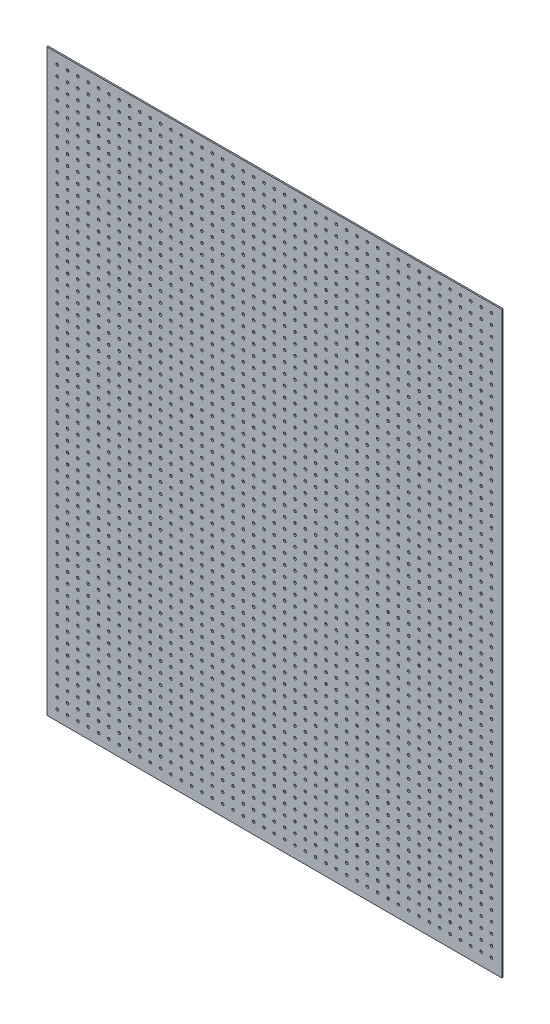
SolidWorks part; units mm, degrees
ref_plane "Front Plane" through (0, 0, 0) normal (0, 0, 1) x (1, 0, 0)
ref_plane "Top Plane" through (0, 0, 0) normal (0, 1, 0) x (1, 0, 0)
ref_plane "Right Plane" through (0, 0, 0) normal (1, 0, 0) x (0, 0, -1)
sketch "Sketch1" plane through (0, 0, 0) normal (0, 0, 1) x (1, 0, 0)
  line L0 (-294.0892, 355.4484) -> (-294.0892, 330.0484) construction
  line L1 (-319.4892, 355.4484) -> (798.1108, 355.4484)
  line L2 (-319.4892, 355.4484) -> (-319.4892, -1066.9516)
  line L3 (-319.4892, -1066.9516) -> (798.1108, -1066.9516)
  line L4 (798.1108, 355.4484) -> (798.1108, -1066.9516)
  line L5 (-294.0892, 330.0484) -> (-319.4892, 330.0484) construction
  circle A0 centre (-294.0892, 330.0484) radius 3.175
  circle A1 centre (-268.6894, 330.1672) radius 3.175
  circle A2 centre (-243.2897, 330.2861) radius 3.175
  circle A3 centre (-217.89, 330.4049) radius 3.175
  circle A4 centre (-192.4903, 330.5237) radius 3.175
  circle A5 centre (-167.0905, 330.6425) radius 3.175
  circle A6 centre (-141.6908, 330.7613) radius 3.175
  circle A7 centre (-116.2911, 330.8802) radius 3.175
  circle A8 centre (-90.8914, 330.999) radius 3.175
  circle A9 centre (-65.4917, 331.1178) radius 3.175
  circle A10 centre (-40.0919, 331.2366) radius 3.175
  circle A11 centre (-14.6922, 331.3554) radius 3.175
  circle A12 centre (10.7075, 331.4742) radius 3.175
  circle A13 centre (36.1072, 331.5931) radius 3.175
  circle A14 centre (61.507, 331.7119) radius 3.175
  circle A15 centre (86.9067, 331.8307) radius 3.175
  circle A16 centre (112.3064, 331.9495) radius 3.175
  circle A17 centre (137.7061, 332.0683) radius 3.175
  circle A18 centre (163.1058, 332.1872) radius 3.175
  circle A19 centre (188.5056, 332.306) radius 3.175
  circle A20 centre (213.9053, 332.4248) radius 3.175
  circle A21 centre (239.305, 332.5436) radius 3.175
  circle A22 centre (264.7047, 332.6624) radius 3.175
  circle A23 centre (290.1045, 332.7812) radius 3.175
  circle A24 centre (315.5042, 332.9001) radius 3.175
  circle A25 centre (340.9039, 333.0189) radius 3.175
  circle A26 centre (366.3036, 333.1377) radius 3.175
  circle A27 centre (391.7033, 333.2565) radius 3.175
  circle A28 centre (417.1031, 333.3753) radius 3.175
  circle A29 centre (442.5028, 333.4942) radius 3.175
  circle A30 centre (467.9025, 333.613) radius 3.175
  circle A31 centre (493.3022, 333.7318) radius 3.175
  circle A32 centre (518.702, 333.8506) radius 3.175
  circle A33 centre (544.1017, 333.9694) radius 3.175
  circle A34 centre (569.5014, 334.0882) radius 3.175
  circle A35 centre (594.9011, 334.2071) radius 3.175
  circle A36 centre (620.3008, 334.3259) radius 3.175
  circle A37 centre (645.7006, 334.4447) radius 3.175
  circle A38 centre (671.1003, 334.5635) radius 3.175
  circle A39 centre (696.5, 334.6823) radius 3.175
  circle A40 centre (721.8997, 334.8012) radius 3.175
  circle A41 centre (747.2994, 334.92) radius 3.175
  circle A42 centre (772.6992, 335.0388) radius 3.175
  circle A43 centre (-268.6894, 304.7672) radius 3.175
  circle A44 centre (-243.2897, 304.8861) radius 3.175
  circle A45 centre (-217.89, 305.0049) radius 3.175
  circle A46 centre (-192.4903, 305.1237) radius 3.175
  circle A47 centre (-167.0905, 305.2425) radius 3.175
  circle A48 centre (-141.6908, 305.3613) radius 3.175
  circle A49 centre (-116.2911, 305.4802) radius 3.175
  circle A50 centre (-90.8914, 305.599) radius 3.175
  circle A51 centre (-65.4917, 305.7178) radius 3.175
  circle A52 centre (-40.0919, 305.8366) radius 3.175
  circle A53 centre (-14.6922, 305.9554) radius 3.175
  circle A54 centre (10.7075, 306.0742) radius 3.175
  circle A55 centre (36.1072, 306.1931) radius 3.175
  circle A56 centre (61.507, 306.3119) radius 3.175
  circle A57 centre (86.9067, 306.4307) radius 3.175
  circle A58 centre (112.3064, 306.5495) radius 3.175
  circle A59 centre (137.7061, 306.6683) radius 3.175
  circle A60 centre (163.1058, 306.7872) radius 3.175
  circle A61 centre (188.5056, 306.906) radius 3.175
  circle A62 centre (213.9053, 307.0248) radius 3.175
  circle A63 centre (239.305, 307.1436) radius 3.175
  circle A64 centre (264.7047, 307.2624) radius 3.175
  circle A65 centre (290.1045, 307.3812) radius 3.175
  circle A66 centre (315.5042, 307.5001) radius 3.175
  circle A67 centre (340.9039, 307.6189) radius 3.175
  circle A68 centre (366.3036, 307.7377) radius 3.175
  circle A69 centre (391.7033, 307.8565) radius 3.175
  circle A70 centre (417.1031, 307.9753) radius 3.175
  circle A71 centre (442.5028, 308.0942) radius 3.175
  circle A72 centre (467.9025, 308.213) radius 3.175
  circle A73 centre (493.3022, 308.3318) radius 3.175
  circle A74 centre (518.702, 308.4506) radius 3.175
  circle A75 centre (544.1017, 308.5694) radius 3.175
  circle A76 centre (569.5014, 308.6882) radius 3.175
  circle A77 centre (594.9011, 308.8071) radius 3.175
  circle A78 centre (620.3008, 308.9259) radius 3.175
  circle A79 centre (645.7006, 309.0447) radius 3.175
  circle A80 centre (671.1003, 309.1635) radius 3.175
  circle A81 centre (696.5, 309.2823) radius 3.175
  circle A82 centre (721.8997, 309.4012) radius 3.175
  circle A83 centre (747.2994, 309.52) radius 3.175
  circle A84 centre (772.6992, 309.6388) radius 3.175
  circle A85 centre (-268.6894, 279.3672) radius 3.175
  circle A86 centre (-243.2897, 279.4861) radius 3.175
  circle A87 centre (-217.89, 279.6049) radius 3.175
  circle A88 centre (-192.4903, 279.7237) radius 3.175
  circle A89 centre (-167.0905, 279.8425) radius 3.175
  circle A90 centre (-141.6908, 279.9613) radius 3.175
  circle A91 centre (-116.2911, 280.0802) radius 3.175
  circle A92 centre (-90.8914, 280.199) radius 3.175
  circle A93 centre (-65.4917, 280.3178) radius 3.175
  circle A94 centre (-40.0919, 280.4366) radius 3.175
  circle A95 centre (-14.6922, 280.5554) radius 3.175
  circle A96 centre (10.7075, 280.6742) radius 3.175
  circle A97 centre (36.1072, 280.7931) radius 3.175
  circle A98 centre (61.507, 280.9119) radius 3.175
  circle A99 centre (86.9067, 281.0307) radius 3.175
  circle A100 centre (112.3064, 281.1495) radius 3.175
  circle A101 centre (137.7061, 281.2683) radius 3.175
  circle A102 centre (163.1058, 281.3872) radius 3.175
  circle A103 centre (188.5056, 281.506) radius 3.175
  circle A104 centre (213.9053, 281.6248) radius 3.175
  circle A105 centre (239.305, 281.7436) radius 3.175
  circle A106 centre (264.7047, 281.8624) radius 3.175
  circle A107 centre (290.1045, 281.9812) radius 3.175
  circle A108 centre (315.5042, 282.1001) radius 3.175
  circle A109 centre (340.9039, 282.2189) radius 3.175
  circle A110 centre (366.3036, 282.3377) radius 3.175
  circle A111 centre (391.7033, 282.4565) radius 3.175
  circle A112 centre (417.1031, 282.5753) radius 3.175
  circle A113 centre (442.5028, 282.6942) radius 3.175
  circle A114 centre (467.9025, 282.813) radius 3.175
  circle A115 centre (493.3022, 282.9318) radius 3.175
  circle A116 centre (518.702, 283.0506) radius 3.175
  circle A117 centre (544.1017, 283.1694) radius 3.175
  circle A118 centre (569.5014, 283.2882) radius 3.175
  circle A119 centre (594.9011, 283.4071) radius 3.175
  circle A120 centre (620.3008, 283.5259) radius 3.175
  circle A121 centre (645.7006, 283.6447) radius 3.175
  circle A122 centre (671.1003, 283.7635) radius 3.175
  circle A123 centre (696.5, 283.8823) radius 3.175
  circle A124 centre (721.8997, 284.0012) radius 3.175
  circle A125 centre (747.2994, 284.12) radius 3.175
  circle A126 centre (772.6992, 284.2388) radius 3.175
  circle A127 centre (-268.6894, 253.9672) radius 3.175
  circle A128 centre (-243.2897, 254.0861) radius 3.175
  circle A129 centre (-217.89, 254.2049) radius 3.175
  circle A130 centre (-192.4903, 254.3237) radius 3.175
  circle A131 centre (-167.0905, 254.4425) radius 3.175
  circle A132 centre (-141.6908, 254.5613) radius 3.175
  circle A133 centre (-116.2911, 254.6802) radius 3.175
  circle A134 centre (-90.8914, 254.799) radius 3.175
  circle A135 centre (-65.4917, 254.9178) radius 3.175
  circle A136 centre (-40.0919, 255.0366) radius 3.175
  circle A137 centre (-14.6922, 255.1554) radius 3.175
  circle A138 centre (10.7075, 255.2742) radius 3.175
  circle A139 centre (36.1072, 255.3931) radius 3.175
  circle A140 centre (61.507, 255.5119) radius 3.175
  circle A141 centre (86.9067, 255.6307) radius 3.175
  circle A142 centre (112.3064, 255.7495) radius 3.175
  circle A143 centre (137.7061, 255.8683) radius 3.175
  circle A144 centre (163.1058, 255.9872) radius 3.175
  circle A145 centre (188.5056, 256.106) radius 3.175
  circle A146 centre (213.9053, 256.2248) radius 3.175
  circle A147 centre (239.305, 256.3436) radius 3.175
  circle A148 centre (264.7047, 256.4624) radius 3.175
  circle A149 centre (290.1045, 256.5812) radius 3.175
  circle A150 centre (315.5042, 256.7001) radius 3.175
  circle A151 centre (340.9039, 256.8189) radius 3.175
  circle A152 centre (366.3036, 256.9377) radius 3.175
  circle A153 centre (391.7033, 257.0565) radius 3.175
  circle A154 centre (417.1031, 257.1753) radius 3.175
  circle A155 centre (442.5028, 257.2942) radius 3.175
  circle A156 centre (467.9025, 257.413) radius 3.175
  circle A157 centre (493.3022, 257.5318) radius 3.175
  circle A158 centre (518.702, 257.6506) radius 3.175
  circle A159 centre (544.1017, 257.7694) radius 3.175
  circle A160 centre (569.5014, 257.8882) radius 3.175
  circle A161 centre (594.9011, 258.0071) radius 3.175
  circle A162 centre (620.3008, 258.1259) radius 3.175
  circle A163 centre (645.7006, 258.2447) radius 3.175
  circle A164 centre (671.1003, 258.3635) radius 3.175
  circle A165 centre (696.5, 258.4823) radius 3.175
  circle A166 centre (721.8997, 258.6012) radius 3.175
  circle A167 centre (747.2994, 258.72) radius 3.175
  circle A168 centre (772.6992, 258.8388) radius 3.175
  circle A169 centre (-268.6894, 228.5672) radius 3.175
  circle A170 centre (-243.2897, 228.6861) radius 3.175
  circle A171 centre (-217.89, 228.8049) radius 3.175
  circle A172 centre (-192.4903, 228.9237) radius 3.175
  circle A173 centre (-167.0905, 229.0425) radius 3.175
  circle A174 centre (-141.6908, 229.1613) radius 3.175
  circle A175 centre (-116.2911, 229.2802) radius 3.175
  circle A176 centre (-90.8914, 229.399) radius 3.175
  circle A177 centre (-65.4917, 229.5178) radius 3.175
  circle A178 centre (-40.0919, 229.6366) radius 3.175
  circle A179 centre (-14.6922, 229.7554) radius 3.175
  circle A180 centre (10.7075, 229.8742) radius 3.175
  circle A181 centre (36.1072, 229.9931) radius 3.175
  circle A182 centre (61.507, 230.1119) radius 3.175
  circle A183 centre (86.9067, 230.2307) radius 3.175
  circle A184 centre (112.3064, 230.3495) radius 3.175
  circle A185 centre (137.7061, 230.4683) radius 3.175
  circle A186 centre (163.1058, 230.5872) radius 3.175
  circle A187 centre (188.5056, 230.706) radius 3.175
  circle A188 centre (213.9053, 230.8248) radius 3.175
  circle A189 centre (239.305, 230.9436) radius 3.175
  circle A190 centre (264.7047, 231.0624) radius 3.175
  circle A191 centre (290.1045, 231.1812) radius 3.175
  circle A192 centre (315.5042, 231.3001) radius 3.175
  circle A193 centre (340.9039, 231.4189) radius 3.175
  circle A194 centre (366.3036, 231.5377) radius 3.175
  circle A195 centre (391.7033, 231.6565) radius 3.175
  circle A196 centre (417.1031, 231.7753) radius 3.175
  circle A197 centre (442.5028, 231.8942) radius 3.175
  circle A198 centre (467.9025, 232.013) radius 3.175
  circle A199 centre (493.3022, 232.1318) radius 3.175
  circle A200 centre (518.702, 232.2506) radius 3.175
  circle A201 centre (544.1017, 232.3694) radius 3.175
  circle A202 centre (569.5014, 232.4882) radius 3.175
  circle A203 centre (594.9011, 232.6071) radius 3.175
  circle A204 centre (620.3008, 232.7259) radius 3.175
  circle A205 centre (645.7006, 232.8447) radius 3.175
  circle A206 centre (671.1003, 232.9635) radius 3.175
  circle A207 centre (696.5, 233.0823) radius 3.175
  circle A208 centre (721.8997, 233.2012) radius 3.175
  circle A209 centre (747.2994, 233.32) radius 3.175
  circle A210 centre (772.6992, 233.4388) radius 3.175
  circle A211 centre (-268.6894, 203.1672) radius 3.175
  circle A212 centre (-243.2897, 203.2861) radius 3.175
  circle A213 centre (-217.89, 203.4049) radius 3.175
  circle A214 centre (-192.4903, 203.5237) radius 3.175
  circle A215 centre (-167.0905, 203.6425) radius 3.175
  circle A216 centre (-141.6908, 203.7613) radius 3.175
  circle A217 centre (-116.2911, 203.8802) radius 3.175
  circle A218 centre (-90.8914, 203.999) radius 3.175
  circle A219 centre (-65.4917, 204.1178) radius 3.175
  circle A220 centre (-40.0919, 204.2366) radius 3.175
  circle A221 centre (-14.6922, 204.3554) radius 3.175
  circle A222 centre (10.7075, 204.4742) radius 3.175
  circle A223 centre (36.1072, 204.5931) radius 3.175
  circle A224 centre (61.507, 204.7119) radius 3.175
  circle A225 centre (86.9067, 204.8307) radius 3.175
  circle A226 centre (112.3064, 204.9495) radius 3.175
  circle A227 centre (137.7061, 205.0683) radius 3.175
  circle A228 centre (163.1058, 205.1872) radius 3.175
  circle A229 centre (188.5056, 205.306) radius 3.175
  circle A230 centre (213.9053, 205.4248) radius 3.175
  circle A231 centre (239.305, 205.5436) radius 3.175
  circle A232 centre (264.7047, 205.6624) radius 3.175
  circle A233 centre (290.1045, 205.7812) radius 3.175
  circle A234 centre (315.5042, 205.9001) radius 3.175
  circle A235 centre (340.9039, 206.0189) radius 3.175
  circle A236 centre (366.3036, 206.1377) radius 3.175
  circle A237 centre (391.7033, 206.2565) radius 3.175
  circle A238 centre (417.1031, 206.3753) radius 3.175
  circle A239 centre (442.5028, 206.4942) radius 3.175
  circle A240 centre (467.9025, 206.613) radius 3.175
  circle A241 centre (493.3022, 206.7318) radius 3.175
  circle A242 centre (518.702, 206.8506) radius 3.175
  circle A243 centre (544.1017, 206.9694) radius 3.175
  circle A244 centre (569.5014, 207.0882) radius 3.175
  circle A245 centre (594.9011, 207.2071) radius 3.175
  circle A246 centre (620.3008, 207.3259) radius 3.175
  circle A247 centre (645.7006, 207.4447) radius 3.175
  circle A248 centre (671.1003, 207.5635) radius 3.175
  circle A249 centre (696.5, 207.6823) radius 3.175
  circle A250 centre (721.8997, 207.8012) radius 3.175
  circle A251 centre (747.2994, 207.92) radius 3.175
  circle A252 centre (772.6992, 208.0388) radius 3.175
  circle A253 centre (-268.6894, 177.7672) radius 3.175
  circle A254 centre (-243.2897, 177.8861) radius 3.175
  circle A255 centre (-217.89, 178.0049) radius 3.175
  circle A256 centre (-192.4903, 178.1237) radius 3.175
  circle A257 centre (-167.0905, 178.2425) radius 3.175
  circle A258 centre (-141.6908, 178.3613) radius 3.175
  circle A259 centre (-116.2911, 178.4802) radius 3.175
  circle A260 centre (-90.8914, 178.599) radius 3.175
  circle A261 centre (-65.4917, 178.7178) radius 3.175
  circle A262 centre (-40.0919, 178.8366) radius 3.175
  circle A263 centre (-14.6922, 178.9554) radius 3.175
  circle A264 centre (10.7075, 179.0742) radius 3.175
  circle A265 centre (36.1072, 179.1931) radius 3.175
  circle A266 centre (61.507, 179.3119) radius 3.175
  circle A267 centre (86.9067, 179.4307) radius 3.175
  circle A268 centre (112.3064, 179.5495) radius 3.175
  circle A269 centre (137.7061, 179.6683) radius 3.175
  circle A270 centre (163.1058, 179.7872) radius 3.175
  circle A271 centre (188.5056, 179.906) radius 3.175
  circle A272 centre (213.9053, 180.0248) radius 3.175
  circle A273 centre (239.305, 180.1436) radius 3.175
  circle A274 centre (264.7047, 180.2624) radius 3.175
  circle A275 centre (290.1045, 180.3812) radius 3.175
  circle A276 centre (315.5042, 180.5001) radius 3.175
  circle A277 centre (340.9039, 180.6189) radius 3.175
  circle A278 centre (366.3036, 180.7377) radius 3.175
  circle A279 centre (391.7033, 180.8565) radius 3.175
  circle A280 centre (417.1031, 180.9753) radius 3.175
  circle A281 centre (442.5028, 181.0942) radius 3.175
  circle A282 centre (467.9025, 181.213) radius 3.175
  circle A283 centre (493.3022, 181.3318) radius 3.175
  circle A284 centre (518.702, 181.4506) radius 3.175
  circle A285 centre (544.1017, 181.5694) radius 3.175
  circle A286 centre (569.5014, 181.6882) radius 3.175
  circle A287 centre (594.9011, 181.8071) radius 3.175
  circle A288 centre (620.3008, 181.9259) radius 3.175
  circle A289 centre (645.7006, 182.0447) radius 3.175
  circle A290 centre (671.1003, 182.1635) radius 3.175
  circle A291 centre (696.5, 182.2823) radius 3.175
  circle A292 centre (721.8997, 182.4012) radius 3.175
  circle A293 centre (747.2994, 182.52) radius 3.175
  circle A294 centre (772.6992, 182.6388) radius 3.175
  circle A295 centre (-268.6894, 152.3672) radius 3.175
  circle A296 centre (-243.2897, 152.4861) radius 3.175
  circle A297 centre (-217.89, 152.6049) radius 3.175
  circle A298 centre (-192.4903, 152.7237) radius 3.175
  circle A299 centre (-167.0905, 152.8425) radius 3.175
  circle A300 centre (-141.6908, 152.9613) radius 3.175
  circle A301 centre (-116.2911, 153.0802) radius 3.175
  circle A302 centre (-90.8914, 153.199) radius 3.175
  circle A303 centre (-65.4917, 153.3178) radius 3.175
  circle A304 centre (-40.0919, 153.4366) radius 3.175
  circle A305 centre (-14.6922, 153.5554) radius 3.175
  circle A306 centre (10.7075, 153.6742) radius 3.175
  circle A307 centre (36.1072, 153.7931) radius 3.175
  circle A308 centre (61.507, 153.9119) radius 3.175
  circle A309 centre (86.9067, 154.0307) radius 3.175
  circle A310 centre (112.3064, 154.1495) radius 3.175
  circle A311 centre (137.7061, 154.2683) radius 3.175
  circle A312 centre (163.1058, 154.3872) radius 3.175
  circle A313 centre (188.5056, 154.506) radius 3.175
  circle A314 centre (213.9053, 154.6248) radius 3.175
  circle A315 centre (239.305, 154.7436) radius 3.175
  circle A316 centre (264.7047, 154.8624) radius 3.175
  circle A317 centre (290.1045, 154.9812) radius 3.175
  circle A318 centre (315.5042, 155.1001) radius 3.175
  circle A319 centre (340.9039, 155.2189) radius 3.175
  circle A320 centre (366.3036, 155.3377) radius 3.175
  circle A321 centre (391.7033, 155.4565) radius 3.175
  circle A322 centre (417.1031, 155.5753) radius 3.175
  circle A323 centre (442.5028, 155.6942) radius 3.175
  circle A324 centre (467.9025, 155.813) radius 3.175
  circle A325 centre (493.3022, 155.9318) radius 3.175
  circle A326 centre (518.702, 156.0506) radius 3.175
  circle A327 centre (544.1017, 156.1694) radius 3.175
  circle A328 centre (569.5014, 156.2882) radius 3.175
  circle A329 centre (594.9011, 156.4071) radius 3.175
  circle A330 centre (620.3008, 156.5259) radius 3.175
  circle A331 centre (645.7006, 156.6447) radius 3.175
  circle A332 centre (671.1003, 156.7635) radius 3.175
  circle A333 centre (696.5, 156.8823) radius 3.175
  circle A334 centre (721.8997, 157.0012) radius 3.175
  circle A335 centre (747.2994, 157.12) radius 3.175
  circle A336 centre (772.6992, 157.2388) radius 3.175
  circle A337 centre (-268.6894, 126.9672) radius 3.175
  circle A338 centre (-243.2897, 127.0861) radius 3.175
  circle A339 centre (-217.89, 127.2049) radius 3.175
  circle A340 centre (-192.4903, 127.3237) radius 3.175
  circle A341 centre (-167.0905, 127.4425) radius 3.175
  circle A342 centre (-141.6908, 127.5613) radius 3.175
  circle A343 centre (-116.2911, 127.6802) radius 3.175
  circle A344 centre (-90.8914, 127.799) radius 3.175
  circle A345 centre (-65.4917, 127.9178) radius 3.175
  circle A346 centre (-40.0919, 128.0366) radius 3.175
  circle A347 centre (-14.6922, 128.1554) radius 3.175
  circle A348 centre (10.7075, 128.2742) radius 3.175
  circle A349 centre (36.1072, 128.3931) radius 3.175
  circle A350 centre (61.507, 128.5119) radius 3.175
  circle A351 centre (86.9067, 128.6307) radius 3.175
  circle A352 centre (112.3064, 128.7495) radius 3.175
  circle A353 centre (137.7061, 128.8683) radius 3.175
  circle A354 centre (163.1058, 128.9872) radius 3.175
  circle A355 centre (188.5056, 129.106) radius 3.175
  circle A356 centre (213.9053, 129.2248) radius 3.175
  circle A357 centre (239.305, 129.3436) radius 3.175
  circle A358 centre (264.7047, 129.4624) radius 3.175
  circle A359 centre (290.1045, 129.5812) radius 3.175
  circle A360 centre (315.5042, 129.7001) radius 3.175
  circle A361 centre (340.9039, 129.8189) radius 3.175
  circle A362 centre (366.3036, 129.9377) radius 3.175
  circle A363 centre (391.7033, 130.0565) radius 3.175
  circle A364 centre (417.1031, 130.1753) radius 3.175
  circle A365 centre (442.5028, 130.2942) radius 3.175
  circle A366 centre (467.9025, 130.413) radius 3.175
  circle A367 centre (493.3022, 130.5318) radius 3.175
  circle A368 centre (518.702, 130.6506) radius 3.175
  circle A369 centre (544.1017, 130.7694) radius 3.175
  circle A370 centre (569.5014, 130.8882) radius 3.175
  circle A371 centre (594.9011, 131.0071) radius 3.175
  circle A372 centre (620.3008, 131.1259) radius 3.175
  circle A373 centre (645.7006, 131.2447) radius 3.175
  circle A374 centre (671.1003, 131.3635) radius 3.175
  circle A375 centre (696.5, 131.4823) radius 3.175
  circle A376 centre (721.8997, 131.6012) radius 3.175
  circle A377 centre (747.2994, 131.72) radius 3.175
  circle A378 centre (772.6992, 131.8388) radius 3.175
  circle A379 centre (-268.6894, 101.5672) radius 3.175
  circle A380 centre (-243.2897, 101.6861) radius 3.175
  circle A381 centre (-217.89, 101.8049) radius 3.175
  circle A382 centre (-192.4903, 101.9237) radius 3.175
  circle A383 centre (-167.0905, 102.0425) radius 3.175
  circle A384 centre (-141.6908, 102.1613) radius 3.175
  circle A385 centre (-116.2911, 102.2802) radius 3.175
  circle A386 centre (-90.8914, 102.399) radius 3.175
  circle A387 centre (-65.4917, 102.5178) radius 3.175
  circle A388 centre (-40.0919, 102.6366) radius 3.175
  circle A389 centre (-14.6922, 102.7554) radius 3.175
  circle A390 centre (10.7075, 102.8742) radius 3.175
  circle A391 centre (36.1072, 102.9931) radius 3.175
  circle A392 centre (61.507, 103.1119) radius 3.175
  circle A393 centre (86.9067, 103.2307) radius 3.175
  circle A394 centre (112.3064, 103.3495) radius 3.175
  circle A395 centre (137.7061, 103.4683) radius 3.175
  circle A396 centre (163.1058, 103.5872) radius 3.175
  circle A397 centre (188.5056, 103.706) radius 3.175
  circle A398 centre (213.9053, 103.8248) radius 3.175
  circle A399 centre (239.305, 103.9436) radius 3.175
  circle A400 centre (264.7047, 104.0624) radius 3.175
  circle A401 centre (290.1045, 104.1812) radius 3.175
  circle A402 centre (315.5042, 104.3001) radius 3.175
  circle A403 centre (340.9039, 104.4189) radius 3.175
  circle A404 centre (366.3036, 104.5377) radius 3.175
  circle A405 centre (391.7033, 104.6565) radius 3.175
  circle A406 centre (417.1031, 104.7753) radius 3.175
  circle A407 centre (442.5028, 104.8942) radius 3.175
  circle A408 centre (467.9025, 105.013) radius 3.175
  circle A409 centre (493.3022, 105.1318) radius 3.175
  circle A410 centre (518.702, 105.2506) radius 3.175
  circle A411 centre (544.1017, 105.3694) radius 3.175
  circle A412 centre (569.5014, 105.4882) radius 3.175
  circle A413 centre (594.9011, 105.6071) radius 3.175
  circle A414 centre (620.3008, 105.7259) radius 3.175
  circle A415 centre (645.7006, 105.8447) radius 3.175
  circle A416 centre (671.1003, 105.9635) radius 3.175
  circle A417 centre (696.5, 106.0823) radius 3.175
  circle A418 centre (721.8997, 106.2012) radius 3.175
  circle A419 centre (747.2994, 106.32) radius 3.175
  circle A420 centre (772.6992, 106.4388) radius 3.175
  circle A421 centre (-268.6894, 76.1672) radius 3.175
  circle A422 centre (-243.2897, 76.2861) radius 3.175
  circle A423 centre (-217.89, 76.4049) radius 3.175
  circle A424 centre (-192.4903, 76.5237) radius 3.175
  circle A425 centre (-167.0905, 76.6425) radius 3.175
  circle A426 centre (-141.6908, 76.7613) radius 3.175
  circle A427 centre (-116.2911, 76.8802) radius 3.175
  circle A428 centre (-90.8914, 76.999) radius 3.175
  circle A429 centre (-65.4917, 77.1178) radius 3.175
  circle A430 centre (-40.0919, 77.2366) radius 3.175
  circle A431 centre (-14.6922, 77.3554) radius 3.175
  circle A432 centre (10.7075, 77.4742) radius 3.175
  circle A433 centre (36.1072, 77.5931) radius 3.175
  circle A434 centre (61.507, 77.7119) radius 3.175
  circle A435 centre (86.9067, 77.8307) radius 3.175
  circle A436 centre (112.3064, 77.9495) radius 3.175
  circle A437 centre (137.7061, 78.0683) radius 3.175
  circle A438 centre (163.1058, 78.1872) radius 3.175
  circle A439 centre (188.5056, 78.306) radius 3.175
  circle A440 centre (213.9053, 78.4248) radius 3.175
  circle A441 centre (239.305, 78.5436) radius 3.175
  circle A442 centre (264.7047, 78.6624) radius 3.175
  circle A443 centre (290.1045, 78.7812) radius 3.175
  circle A444 centre (315.5042, 78.9001) radius 3.175
  circle A445 centre (340.9039, 79.0189) radius 3.175
  circle A446 centre (366.3036, 79.1377) radius 3.175
  circle A447 centre (391.7033, 79.2565) radius 3.175
  circle A448 centre (417.1031, 79.3753) radius 3.175
  circle A449 centre (442.5028, 79.4942) radius 3.175
  circle A450 centre (467.9025, 79.613) radius 3.175
  circle A451 centre (493.3022, 79.7318) radius 3.175
  circle A452 centre (518.702, 79.8506) radius 3.175
  circle A453 centre (544.1017, 79.9694) radius 3.175
  circle A454 centre (569.5014, 80.0882) radius 3.175
  circle A455 centre (594.9011, 80.2071) radius 3.175
  circle A456 centre (620.3008, 80.3259) radius 3.175
  circle A457 centre (645.7006, 80.4447) radius 3.175
  circle A458 centre (671.1003, 80.5635) radius 3.175
  circle A459 centre (696.5, 80.6823) radius 3.175
  circle A460 centre (721.8997, 80.8012) radius 3.175
  circle A461 centre (747.2994, 80.92) radius 3.175
  circle A462 centre (772.6992, 81.0388) radius 3.175
  circle A463 centre (-268.6894, 50.7672) radius 3.175
  circle A464 centre (-243.2897, 50.8861) radius 3.175
  circle A465 centre (-217.89, 51.0049) radius 3.175
  circle A466 centre (-192.4903, 51.1237) radius 3.175
  circle A467 centre (-167.0905, 51.2425) radius 3.175
  circle A468 centre (-141.6908, 51.3613) radius 3.175
  circle A469 centre (-116.2911, 51.4802) radius 3.175
  circle A470 centre (-90.8914, 51.599) radius 3.175
  circle A471 centre (-65.4917, 51.7178) radius 3.175
  circle A472 centre (-40.0919, 51.8366) radius 3.175
  circle A473 centre (-14.6922, 51.9554) radius 3.175
  circle A474 centre (10.7075, 52.0742) radius 3.175
  circle A475 centre (36.1072, 52.1931) radius 3.175
  circle A476 centre (61.507, 52.3119) radius 3.175
  circle A477 centre (86.9067, 52.4307) radius 3.175
  circle A478 centre (112.3064, 52.5495) radius 3.175
  circle A479 centre (137.7061, 52.6683) radius 3.175
  circle A480 centre (163.1058, 52.7872) radius 3.175
  circle A481 centre (188.5056, 52.906) radius 3.175
  circle A482 centre (213.9053, 53.0248) radius 3.175
  circle A483 centre (239.305, 53.1436) radius 3.175
  circle A484 centre (264.7047, 53.2624) radius 3.175
  circle A485 centre (290.1045, 53.3812) radius 3.175
  circle A486 centre (315.5042, 53.5001) radius 3.175
  circle A487 centre (340.9039, 53.6189) radius 3.175
  circle A488 centre (366.3036, 53.7377) radius 3.175
  circle A489 centre (391.7033, 53.8565) radius 3.175
  circle A490 centre (417.1031, 53.9753) radius 3.175
  circle A491 centre (442.5028, 54.0942) radius 3.175
  circle A492 centre (467.9025, 54.213) radius 3.175
  circle A493 centre (493.3022, 54.3318) radius 3.175
  circle A494 centre (518.702, 54.4506) radius 3.175
  circle A495 centre (544.1017, 54.5694) radius 3.175
  circle A496 centre (569.5014, 54.6882) radius 3.175
  circle A497 centre (594.9011, 54.8071) radius 3.175
  circle A498 centre (620.3008, 54.9259) radius 3.175
  circle A499 centre (645.7006, 55.0447) radius 3.175
  circle A500 centre (671.1003, 55.1635) radius 3.175
  circle A501 centre (696.5, 55.2823) radius 3.175
  circle A502 centre (721.8997, 55.4012) radius 3.175
  circle A503 centre (747.2994, 55.52) radius 3.175
  circle A504 centre (772.6992, 55.6388) radius 3.175
  circle A505 centre (-268.6894, 25.3672) radius 3.175
  circle A506 centre (-243.2897, 25.4861) radius 3.175
  circle A507 centre (-217.89, 25.6049) radius 3.175
  circle A508 centre (-192.4903, 25.7237) radius 3.175
  circle A509 centre (-167.0905, 25.8425) radius 3.175
  circle A510 centre (-141.6908, 25.9613) radius 3.175
  circle A511 centre (-116.2911, 26.0802) radius 3.175
  circle A512 centre (-90.8914, 26.199) radius 3.175
  circle A513 centre (-65.4917, 26.3178) radius 3.175
  circle A514 centre (-40.0919, 26.4366) radius 3.175
  circle A515 centre (-14.6922, 26.5554) radius 3.175
  circle A516 centre (10.7075, 26.6742) radius 3.175
  circle A517 centre (36.1072, 26.7931) radius 3.175
  circle A518 centre (61.507, 26.9119) radius 3.175
  circle A519 centre (86.9067, 27.0307) radius 3.175
  circle A520 centre (112.3064, 27.1495) radius 3.175
  circle A521 centre (137.7061, 27.2683) radius 3.175
  circle A522 centre (163.1058, 27.3872) radius 3.175
  circle A523 centre (188.5056, 27.506) radius 3.175
  circle A524 centre (213.9053, 27.6248) radius 3.175
  circle A525 centre (239.305, 27.7436) radius 3.175
  circle A526 centre (264.7047, 27.8624) radius 3.175
  circle A527 centre (290.1045, 27.9812) radius 3.175
  circle A528 centre (315.5042, 28.1001) radius 3.175
  circle A529 centre (340.9039, 28.2189) radius 3.175
  circle A530 centre (366.3036, 28.3377) radius 3.175
  circle A531 centre (391.7033, 28.4565) radius 3.175
  circle A532 centre (417.1031, 28.5753) radius 3.175
  circle A533 centre (442.5028, 28.6942) radius 3.175
  circle A534 centre (467.9025, 28.813) radius 3.175
  circle A535 centre (493.3022, 28.9318) radius 3.175
  circle A536 centre (518.702, 29.0506) radius 3.175
  circle A537 centre (544.1017, 29.1694) radius 3.175
  circle A538 centre (569.5014, 29.2882) radius 3.175
  circle A539 centre (594.9011, 29.4071) radius 3.175
  circle A540 centre (620.3008, 29.5259) radius 3.175
  circle A541 centre (645.7006, 29.6447) radius 3.175
  circle A542 centre (671.1003, 29.7635) radius 3.175
  circle A543 centre (696.5, 29.8823) radius 3.175
  circle A544 centre (721.8997, 30.0012) radius 3.175
  circle A545 centre (747.2994, 30.12) radius 3.175
  circle A546 centre (772.6992, 30.2388) radius 3.175
  circle A547 centre (-268.6894, -0.0328) radius 3.175
  circle A548 centre (-243.2897, 0.0861) radius 3.175
  circle A549 centre (-217.89, 0.2049) radius 3.175
  circle A550 centre (-192.4903, 0.3237) radius 3.175
  circle A551 centre (-167.0905, 0.4425) radius 3.175
  circle A552 centre (-141.6908, 0.5613) radius 3.175
  circle A553 centre (-116.2911, 0.6802) radius 3.175
  circle A554 centre (-90.8914, 0.799) radius 3.175
  circle A555 centre (-65.4917, 0.9178) radius 3.175
  circle A556 centre (-40.0919, 1.0366) radius 3.175
  circle A557 centre (-14.6922, 1.1554) radius 3.175
  circle A558 centre (10.7075, 1.2742) radius 3.175
  circle A559 centre (36.1072, 1.3931) radius 3.175
  circle A560 centre (61.507, 1.5119) radius 3.175
  circle A561 centre (86.9067, 1.6307) radius 3.175
  circle A562 centre (112.3064, 1.7495) radius 3.175
  circle A563 centre (137.7061, 1.8683) radius 3.175
  circle A564 centre (163.1058, 1.9872) radius 3.175
  circle A565 centre (188.5056, 2.106) radius 3.175
  circle A566 centre (213.9053, 2.2248) radius 3.175
  circle A567 centre (239.305, 2.3436) radius 3.175
  circle A568 centre (264.7047, 2.4624) radius 3.175
  circle A569 centre (290.1045, 2.5812) radius 3.175
  circle A570 centre (315.5042, 2.7001) radius 3.175
  circle A571 centre (340.9039, 2.8189) radius 3.175
  circle A572 centre (366.3036, 2.9377) radius 3.175
  circle A573 centre (391.7033, 3.0565) radius 3.175
  circle A574 centre (417.1031, 3.1753) radius 3.175
  circle A575 centre (442.5028, 3.2942) radius 3.175
  circle A576 centre (467.9025, 3.413) radius 3.175
  circle A577 centre (493.3022, 3.5318) radius 3.175
  circle A578 centre (518.702, 3.6506) radius 3.175
  circle A579 centre (544.1017, 3.7694) radius 3.175
  circle A580 centre (569.5014, 3.8882) radius 3.175
  circle A581 centre (594.9011, 4.0071) radius 3.175
  circle A582 centre (620.3008, 4.1259) radius 3.175
  circle A583 centre (645.7006, 4.2447) radius 3.175
  circle A584 centre (671.1003, 4.3635) radius 3.175
  circle A585 centre (696.5, 4.4823) radius 3.175
  circle A586 centre (721.8997, 4.6012) radius 3.175
  circle A587 centre (747.2994, 4.72) radius 3.175
  circle A588 centre (772.6992, 4.8388) radius 3.175
  circle A589 centre (-268.6894, -25.4328) radius 3.175
  circle A590 centre (-243.2897, -25.3139) radius 3.175
  circle A591 centre (-217.89, -25.1951) radius 3.175
  circle A592 centre (-192.4903, -25.0763) radius 3.175
  circle A593 centre (-167.0905, -24.9575) radius 3.175
  circle A594 centre (-141.6908, -24.8387) radius 3.175
  circle A595 centre (-116.2911, -24.7198) radius 3.175
  circle A596 centre (-90.8914, -24.601) radius 3.175
  circle A597 centre (-65.4917, -24.4822) radius 3.175
  circle A598 centre (-40.0919, -24.3634) radius 3.175
  circle A599 centre (-14.6922, -24.2446) radius 3.175
  circle A600 centre (10.7075, -24.1258) radius 3.175
  circle A601 centre (36.1072, -24.0069) radius 3.175
  circle A602 centre (61.507, -23.8881) radius 3.175
  circle A603 centre (86.9067, -23.7693) radius 3.175
  circle A604 centre (112.3064, -23.6505) radius 3.175
  circle A605 centre (137.7061, -23.5317) radius 3.175
  circle A606 centre (163.1058, -23.4128) radius 3.175
  circle A607 centre (188.5056, -23.294) radius 3.175
  circle A608 centre (213.9053, -23.1752) radius 3.175
  circle A609 centre (239.305, -23.0564) radius 3.175
  circle A610 centre (264.7047, -22.9376) radius 3.175
  circle A611 centre (290.1045, -22.8188) radius 3.175
  circle A612 centre (315.5042, -22.6999) radius 3.175
  circle A613 centre (340.9039, -22.5811) radius 3.175
  circle A614 centre (366.3036, -22.4623) radius 3.175
  circle A615 centre (391.7033, -22.3435) radius 3.175
  circle A616 centre (417.1031, -22.2247) radius 3.175
  circle A617 centre (442.5028, -22.1058) radius 3.175
  circle A618 centre (467.9025, -21.987) radius 3.175
  circle A619 centre (493.3022, -21.8682) radius 3.175
  circle A620 centre (518.702, -21.7494) radius 3.175
  circle A621 centre (544.1017, -21.6306) radius 3.175
  circle A622 centre (569.5014, -21.5118) radius 3.175
  circle A623 centre (594.9011, -21.3929) radius 3.175
  circle A624 centre (620.3008, -21.2741) radius 3.175
  circle A625 centre (645.7006, -21.1553) radius 3.175
  circle A626 centre (671.1003, -21.0365) radius 3.175
  circle A627 centre (696.5, -20.9177) radius 3.175
  circle A628 centre (721.8997, -20.7988) radius 3.175
  circle A629 centre (747.2994, -20.68) radius 3.175
  circle A630 centre (772.6992, -20.5612) radius 3.175
  circle A631 centre (-268.6894, -50.8328) radius 3.175
  circle A632 centre (-243.2897, -50.7139) radius 3.175
  circle A633 centre (-217.89, -50.5951) radius 3.175
  circle A634 centre (-192.4903, -50.4763) radius 3.175
  circle A635 centre (-167.0905, -50.3575) radius 3.175
  circle A636 centre (-141.6908, -50.2387) radius 3.175
  circle A637 centre (-116.2911, -50.1198) radius 3.175
  circle A638 centre (-90.8914, -50.001) radius 3.175
  circle A639 centre (-65.4917, -49.8822) radius 3.175
  circle A640 centre (-40.0919, -49.7634) radius 3.175
  circle A641 centre (-14.6922, -49.6446) radius 3.175
  circle A642 centre (10.7075, -49.5258) radius 3.175
  circle A643 centre (36.1072, -49.4069) radius 3.175
  circle A644 centre (61.507, -49.2881) radius 3.175
  circle A645 centre (86.9067, -49.1693) radius 3.175
  circle A646 centre (112.3064, -49.0505) radius 3.175
  circle A647 centre (137.7061, -48.9317) radius 3.175
  circle A648 centre (163.1058, -48.8128) radius 3.175
  circle A649 centre (188.5056, -48.694) radius 3.175
  circle A650 centre (213.9053, -48.5752) radius 3.175
  circle A651 centre (239.305, -48.4564) radius 3.175
  circle A652 centre (264.7047, -48.3376) radius 3.175
  circle A653 centre (290.1045, -48.2188) radius 3.175
  circle A654 centre (315.5042, -48.0999) radius 3.175
  circle A655 centre (340.9039, -47.9811) radius 3.175
  circle A656 centre (366.3036, -47.8623) radius 3.175
  circle A657 centre (391.7033, -47.7435) radius 3.175
  circle A658 centre (417.1031, -47.6247) radius 3.175
  circle A659 centre (442.5028, -47.5058) radius 3.175
  circle A660 centre (467.9025, -47.387) radius 3.175
  circle A661 centre (493.3022, -47.2682) radius 3.175
  circle A662 centre (518.702, -47.1494) radius 3.175
  circle A663 centre (544.1017, -47.0306) radius 3.175
  circle A664 centre (569.5014, -46.9118) radius 3.175
  circle A665 centre (594.9011, -46.7929) radius 3.175
  circle A666 centre (620.3008, -46.6741) radius 3.175
  circle A667 centre (645.7006, -46.5553) radius 3.175
  circle A668 centre (671.1003, -46.4365) radius 3.175
  circle A669 centre (696.5, -46.3177) radius 3.175
  circle A670 centre (721.8997, -46.1988) radius 3.175
  circle A671 centre (747.2994, -46.08) radius 3.175
  circle A672 centre (772.6992, -45.9612) radius 3.175
  circle A673 centre (-268.6894, -76.2328) radius 3.175
  circle A674 centre (-243.2897, -76.1139) radius 3.175
  circle A675 centre (-217.89, -75.9951) radius 3.175
  circle A676 centre (-192.4903, -75.8763) radius 3.175
  circle A677 centre (-167.0905, -75.7575) radius 3.175
  circle A678 centre (-141.6908, -75.6387) radius 3.175
  circle A679 centre (-116.2911, -75.5198) radius 3.175
  circle A680 centre (-90.8914, -75.401) radius 3.175
  circle A681 centre (-65.4917, -75.2822) radius 3.175
  circle A682 centre (-40.0919, -75.1634) radius 3.175
  circle A683 centre (-14.6922, -75.0446) radius 3.175
  circle A684 centre (10.7075, -74.9258) radius 3.175
  circle A685 centre (36.1072, -74.8069) radius 3.175
  circle A686 centre (61.507, -74.6881) radius 3.175
  circle A687 centre (86.9067, -74.5693) radius 3.175
  circle A688 centre (112.3064, -74.4505) radius 3.175
  circle A689 centre (137.7061, -74.3317) radius 3.175
  circle A690 centre (163.1058, -74.2128) radius 3.175
  circle A691 centre (188.5056, -74.094) radius 3.175
  circle A692 centre (213.9053, -73.9752) radius 3.175
  circle A693 centre (239.305, -73.8564) radius 3.175
  circle A694 centre (264.7047, -73.7376) radius 3.175
  circle A695 centre (290.1045, -73.6188) radius 3.175
  circle A696 centre (315.5042, -73.4999) radius 3.175
  circle A697 centre (340.9039, -73.3811) radius 3.175
  circle A698 centre (366.3036, -73.2623) radius 3.175
  circle A699 centre (391.7033, -73.1435) radius 3.175
  circle A700 centre (417.1031, -73.0247) radius 3.175
  circle A701 centre (442.5028, -72.9058) radius 3.175
  circle A702 centre (467.9025, -72.787) radius 3.175
  circle A703 centre (493.3022, -72.6682) radius 3.175
  circle A704 centre (518.702, -72.5494) radius 3.175
  circle A705 centre (544.1017, -72.4306) radius 3.175
  circle A706 centre (569.5014, -72.3118) radius 3.175
  circle A707 centre (594.9011, -72.1929) radius 3.175
  circle A708 centre (620.3008, -72.0741) radius 3.175
  circle A709 centre (645.7006, -71.9553) radius 3.175
  circle A710 centre (671.1003, -71.8365) radius 3.175
  circle A711 centre (696.5, -71.7177) radius 3.175
  circle A712 centre (721.8997, -71.5988) radius 3.175
  circle A713 centre (747.2994, -71.48) radius 3.175
  circle A714 centre (772.6992, -71.3612) radius 3.175
  circle A715 centre (-268.6894, -101.6328) radius 3.175
  circle A716 centre (-243.2897, -101.5139) radius 3.175
  circle A717 centre (-217.89, -101.3951) radius 3.175
  circle A718 centre (-192.4903, -101.2763) radius 3.175
  circle A719 centre (-167.0905, -101.1575) radius 3.175
  circle A720 centre (-141.6908, -101.0387) radius 3.175
  circle A721 centre (-116.2911, -100.9198) radius 3.175
  circle A722 centre (-90.8914, -100.801) radius 3.175
  circle A723 centre (-65.4917, -100.6822) radius 3.175
  circle A724 centre (-40.0919, -100.5634) radius 3.175
  circle A725 centre (-14.6922, -100.4446) radius 3.175
  circle A726 centre (10.7075, -100.3258) radius 3.175
  circle A727 centre (36.1072, -100.2069) radius 3.175
  circle A728 centre (61.507, -100.0881) radius 3.175
  circle A729 centre (86.9067, -99.9693) radius 3.175
  circle A730 centre (112.3064, -99.8505) radius 3.175
  circle A731 centre (137.7061, -99.7317) radius 3.175
  circle A732 centre (163.1058, -99.6128) radius 3.175
  circle A733 centre (188.5056, -99.494) radius 3.175
  circle A734 centre (213.9053, -99.3752) radius 3.175
  circle A735 centre (239.305, -99.2564) radius 3.175
  circle A736 centre (264.7047, -99.1376) radius 3.175
  circle A737 centre (290.1045, -99.0188) radius 3.175
  circle A738 centre (315.5042, -98.8999) radius 3.175
  circle A739 centre (340.9039, -98.7811) radius 3.175
  circle A740 centre (366.3036, -98.6623) radius 3.175
  circle A741 centre (391.7033, -98.5435) radius 3.175
  circle A742 centre (417.1031, -98.4247) radius 3.175
  circle A743 centre (442.5028, -98.3058) radius 3.175
  circle A744 centre (467.9025, -98.187) radius 3.175
  circle A745 centre (493.3022, -98.0682) radius 3.175
  circle A746 centre (518.702, -97.9494) radius 3.175
  circle A747 centre (544.1017, -97.8306) radius 3.175
  circle A748 centre (569.5014, -97.7118) radius 3.175
  circle A749 centre (594.9011, -97.5929) radius 3.175
  circle A750 centre (620.3008, -97.4741) radius 3.175
  circle A751 centre (645.7006, -97.3553) radius 3.175
  circle A752 centre (671.1003, -97.2365) radius 3.175
  circle A753 centre (696.5, -97.1177) radius 3.175
  circle A754 centre (721.8997, -96.9988) radius 3.175
  circle A755 centre (747.2994, -96.88) radius 3.175
  circle A756 centre (772.6992, -96.7612) radius 3.175
  circle A757 centre (-268.6894, -127.0328) radius 3.175
  circle A758 centre (-243.2897, -126.9139) radius 3.175
  circle A759 centre (-217.89, -126.7951) radius 3.175
  circle A760 centre (-192.4903, -126.6763) radius 3.175
  circle A761 centre (-167.0905, -126.5575) radius 3.175
  circle A762 centre (-141.6908, -126.4387) radius 3.175
  circle A763 centre (-116.2911, -126.3198) radius 3.175
  circle A764 centre (-90.8914, -126.201) radius 3.175
  circle A765 centre (-65.4917, -126.0822) radius 3.175
  circle A766 centre (-40.0919, -125.9634) radius 3.175
  circle A767 centre (-14.6922, -125.8446) radius 3.175
  circle A768 centre (10.7075, -125.7258) radius 3.175
  circle A769 centre (36.1072, -125.6069) radius 3.175
  circle A770 centre (61.507, -125.4881) radius 3.175
  circle A771 centre (86.9067, -125.3693) radius 3.175
  circle A772 centre (112.3064, -125.2505) radius 3.175
  circle A773 centre (137.7061, -125.1317) radius 3.175
  circle A774 centre (163.1058, -125.0128) radius 3.175
  circle A775 centre (188.5056, -124.894) radius 3.175
  circle A776 centre (213.9053, -124.7752) radius 3.175
  circle A777 centre (239.305, -124.6564) radius 3.175
  circle A778 centre (264.7047, -124.5376) radius 3.175
  circle A779 centre (290.1045, -124.4188) radius 3.175
  circle A780 centre (315.5042, -124.2999) radius 3.175
  circle A781 centre (340.9039, -124.1811) radius 3.175
  circle A782 centre (366.3036, -124.0623) radius 3.175
  circle A783 centre (391.7033, -123.9435) radius 3.175
  circle A784 centre (417.1031, -123.8247) radius 3.175
  circle A785 centre (442.5028, -123.7058) radius 3.175
  circle A786 centre (467.9025, -123.587) radius 3.175
  circle A787 centre (493.3022, -123.4682) radius 3.175
  circle A788 centre (518.702, -123.3494) radius 3.175
  circle A789 centre (544.1017, -123.2306) radius 3.175
  circle A790 centre (569.5014, -123.1118) radius 3.175
  circle A791 centre (594.9011, -122.9929) radius 3.175
  circle A792 centre (620.3008, -122.8741) radius 3.175
  circle A793 centre (645.7006, -122.7553) radius 3.175
  circle A794 centre (671.1003, -122.6365) radius 3.175
  circle A795 centre (696.5, -122.5177) radius 3.175
  circle A796 centre (721.8997, -122.3988) radius 3.175
  circle A797 centre (747.2994, -122.28) radius 3.175
  circle A798 centre (772.6992, -122.1612) radius 3.175
  circle A799 centre (-268.6894, -152.4328) radius 3.175
  circle A800 centre (-243.2897, -152.3139) radius 3.175
  circle A801 centre (-217.89, -152.1951) radius 3.175
  circle A802 centre (-192.4903, -152.0763) radius 3.175
  circle A803 centre (-167.0905, -151.9575) radius 3.175
  circle A804 centre (-141.6908, -151.8387) radius 3.175
  circle A805 centre (-116.2911, -151.7198) radius 3.175
  circle A806 centre (-90.8914, -151.601) radius 3.175
  circle A807 centre (-65.4917, -151.4822) radius 3.175
  circle A808 centre (-40.0919, -151.3634) radius 3.175
  circle A809 centre (-14.6922, -151.2446) radius 3.175
  circle A810 centre (10.7075, -151.1258) radius 3.175
  circle A811 centre (36.1072, -151.0069) radius 3.175
  circle A812 centre (61.507, -150.8881) radius 3.175
  circle A813 centre (86.9067, -150.7693) radius 3.175
  circle A814 centre (112.3064, -150.6505) radius 3.175
  circle A815 centre (137.7061, -150.5317) radius 3.175
  circle A816 centre (163.1058, -150.4128) radius 3.175
  circle A817 centre (188.5056, -150.294) radius 3.175
  circle A818 centre (213.9053, -150.1752) radius 3.175
  circle A819 centre (239.305, -150.0564) radius 3.175
  circle A820 centre (264.7047, -149.9376) radius 3.175
  circle A821 centre (290.1045, -149.8188) radius 3.175
  circle A822 centre (315.5042, -149.6999) radius 3.175
  circle A823 centre (340.9039, -149.5811) radius 3.175
  circle A824 centre (366.3036, -149.4623) radius 3.175
  circle A825 centre (391.7033, -149.3435) radius 3.175
  circle A826 centre (417.1031, -149.2247) radius 3.175
  circle A827 centre (442.5028, -149.1058) radius 3.175
  circle A828 centre (467.9025, -148.987) radius 3.175
  circle A829 centre (493.3022, -148.8682) radius 3.175
  circle A830 centre (518.702, -148.7494) radius 3.175
  circle A831 centre (544.1017, -148.6306) radius 3.175
  circle A832 centre (569.5014, -148.5118) radius 3.175
  circle A833 centre (594.9011, -148.3929) radius 3.175
  circle A834 centre (620.3008, -148.2741) radius 3.175
  circle A835 centre (645.7006, -148.1553) radius 3.175
  circle A836 centre (671.1003, -148.0365) radius 3.175
  circle A837 centre (696.5, -147.9177) radius 3.175
  circle A838 centre (721.8997, -147.7988) radius 3.175
  circle A839 centre (747.2994, -147.68) radius 3.175
  circle A840 centre (772.6992, -147.5612) radius 3.175
  circle A841 centre (-268.6894, -177.8328) radius 3.175
  circle A842 centre (-243.2897, -177.7139) radius 3.175
  circle A843 centre (-217.89, -177.5951) radius 3.175
  circle A844 centre (-192.4903, -177.4763) radius 3.175
  circle A845 centre (-167.0905, -177.3575) radius 3.175
  circle A846 centre (-141.6908, -177.2387) radius 3.175
  circle A847 centre (-116.2911, -177.1198) radius 3.175
  circle A848 centre (-90.8914, -177.001) radius 3.175
  circle A849 centre (-65.4917, -176.8822) radius 3.175
  circle A850 centre (-40.0919, -176.7634) radius 3.175
  circle A851 centre (-14.6922, -176.6446) radius 3.175
  circle A852 centre (10.7075, -176.5258) radius 3.175
  circle A853 centre (36.1072, -176.4069) radius 3.175
  circle A854 centre (61.507, -176.2881) radius 3.175
  circle A855 centre (86.9067, -176.1693) radius 3.175
  circle A856 centre (112.3064, -176.0505) radius 3.175
  circle A857 centre (137.7061, -175.9317) radius 3.175
  circle A858 centre (163.1058, -175.8128) radius 3.175
  circle A859 centre (188.5056, -175.694) radius 3.175
  circle A860 centre (213.9053, -175.5752) radius 3.175
  circle A861 centre (239.305, -175.4564) radius 3.175
  circle A862 centre (264.7047, -175.3376) radius 3.175
  circle A863 centre (290.1045, -175.2188) radius 3.175
  circle A864 centre (315.5042, -175.0999) radius 3.175
  circle A865 centre (340.9039, -174.9811) radius 3.175
  circle A866 centre (366.3036, -174.8623) radius 3.175
  circle A867 centre (391.7033, -174.7435) radius 3.175
  circle A868 centre (417.1031, -174.6247) radius 3.175
  circle A869 centre (442.5028, -174.5058) radius 3.175
  circle A870 centre (467.9025, -174.387) radius 3.175
  circle A871 centre (493.3022, -174.2682) radius 3.175
  circle A872 centre (518.702, -174.1494) radius 3.175
  circle A873 centre (544.1017, -174.0306) radius 3.175
  circle A874 centre (569.5014, -173.9118) radius 3.175
  circle A875 centre (594.9011, -173.7929) radius 3.175
  circle A876 centre (620.3008, -173.6741) radius 3.175
  circle A877 centre (645.7006, -173.5553) radius 3.175
  circle A878 centre (671.1003, -173.4365) radius 3.175
  circle A879 centre (696.5, -173.3177) radius 3.175
  circle A880 centre (721.8997, -173.1988) radius 3.175
  circle A881 centre (747.2994, -173.08) radius 3.175
  circle A882 centre (772.6992, -172.9612) radius 3.175
  circle A883 centre (-268.6894, -203.2328) radius 3.175
  circle A884 centre (-243.2897, -203.1139) radius 3.175
  circle A885 centre (-217.89, -202.9951) radius 3.175
  circle A886 centre (-192.4903, -202.8763) radius 3.175
  circle A887 centre (-167.0905, -202.7575) radius 3.175
  circle A888 centre (-141.6908, -202.6387) radius 3.175
  circle A889 centre (-116.2911, -202.5198) radius 3.175
  circle A890 centre (-90.8914, -202.401) radius 3.175
  circle A891 centre (-65.4917, -202.2822) radius 3.175
  circle A892 centre (-40.0919, -202.1634) radius 3.175
  circle A893 centre (-14.6922, -202.0446) radius 3.175
  circle A894 centre (10.7075, -201.9258) radius 3.175
  circle A895 centre (36.1072, -201.8069) radius 3.175
  circle A896 centre (61.507, -201.6881) radius 3.175
  circle A897 centre (86.9067, -201.5693) radius 3.175
  circle A898 centre (112.3064, -201.4505) radius 3.175
  circle A899 centre (137.7061, -201.3317) radius 3.175
  circle A900 centre (163.1058, -201.2128) radius 3.175
  circle A901 centre (188.5056, -201.094) radius 3.175
  circle A902 centre (213.9053, -200.9752) radius 3.175
  circle A903 centre (239.305, -200.8564) radius 3.175
  circle A904 centre (264.7047, -200.7376) radius 3.175
  circle A905 centre (290.1045, -200.6188) radius 3.175
  circle A906 centre (315.5042, -200.4999) radius 3.175
  circle A907 centre (340.9039, -200.3811) radius 3.175
  circle A908 centre (366.3036, -200.2623) radius 3.175
  circle A909 centre (391.7033, -200.1435) radius 3.175
  circle A910 centre (417.1031, -200.0247) radius 3.175
  circle A911 centre (442.5028, -199.9058) radius 3.175
  circle A912 centre (467.9025, -199.787) radius 3.175
  circle A913 centre (493.3022, -199.6682) radius 3.175
  circle A914 centre (518.702, -199.5494) radius 3.175
  circle A915 centre (544.1017, -199.4306) radius 3.175
  circle A916 centre (569.5014, -199.3118) radius 3.175
  circle A917 centre (594.9011, -199.1929) radius 3.175
  circle A918 centre (620.3008, -199.0741) radius 3.175
  circle A919 centre (645.7006, -198.9553) radius 3.175
  circle A920 centre (671.1003, -198.8365) radius 3.175
  circle A921 centre (696.5, -198.7177) radius 3.175
  circle A922 centre (721.8997, -198.5988) radius 3.175
  circle A923 centre (747.2994, -198.48) radius 3.175
  circle A924 centre (772.6992, -198.3612) radius 3.175
  circle A925 centre (-268.6894, -228.6328) radius 3.175
  circle A926 centre (-243.2897, -228.5139) radius 3.175
  circle A927 centre (-217.89, -228.3951) radius 3.175
  circle A928 centre (-192.4903, -228.2763) radius 3.175
  circle A929 centre (-167.0905, -228.1575) radius 3.175
  circle A930 centre (-141.6908, -228.0387) radius 3.175
  circle A931 centre (-116.2911, -227.9198) radius 3.175
  circle A932 centre (-90.8914, -227.801) radius 3.175
  circle A933 centre (-65.4917, -227.6822) radius 3.175
  circle A934 centre (-40.0919, -227.5634) radius 3.175
  circle A935 centre (-14.6922, -227.4446) radius 3.175
  circle A936 centre (10.7075, -227.3258) radius 3.175
  circle A937 centre (36.1072, -227.2069) radius 3.175
  circle A938 centre (61.507, -227.0881) radius 3.175
  circle A939 centre (86.9067, -226.9693) radius 3.175
  circle A940 centre (112.3064, -226.8505) radius 3.175
  circle A941 centre (137.7061, -226.7317) radius 3.175
  circle A942 centre (163.1058, -226.6128) radius 3.175
  circle A943 centre (188.5056, -226.494) radius 3.175
  circle A944 centre (213.9053, -226.3752) radius 3.175
  circle A945 centre (239.305, -226.2564) radius 3.175
  circle A946 centre (264.7047, -226.1376) radius 3.175
  circle A947 centre (290.1045, -226.0188) radius 3.175
  circle A948 centre (315.5042, -225.8999) radius 3.175
  circle A949 centre (340.9039, -225.7811) radius 3.175
  circle A950 centre (366.3036, -225.6623) radius 3.175
  circle A951 centre (391.7033, -225.5435) radius 3.175
  circle A952 centre (417.1031, -225.4247) radius 3.175
  circle A953 centre (442.5028, -225.3058) radius 3.175
  circle A954 centre (467.9025, -225.187) radius 3.175
  circle A955 centre (493.3022, -225.0682) radius 3.175
  circle A956 centre (518.702, -224.9494) radius 3.175
  circle A957 centre (544.1017, -224.8306) radius 3.175
  circle A958 centre (569.5014, -224.7118) radius 3.175
  circle A959 centre (594.9011, -224.5929) radius 3.175
  circle A960 centre (620.3008, -224.4741) radius 3.175
  circle A961 centre (645.7006, -224.3553) radius 3.175
  circle A962 centre (671.1003, -224.2365) radius 3.175
  circle A963 centre (696.5, -224.1177) radius 3.175
  circle A964 centre (721.8997, -223.9988) radius 3.175
  circle A965 centre (747.2994, -223.88) radius 3.175
  circle A966 centre (772.6992, -223.7612) radius 3.175
  circle A967 centre (-268.6894, -254.0328) radius 3.175
  circle A968 centre (-243.2897, -253.9139) radius 3.175
  circle A969 centre (-217.89, -253.7951) radius 3.175
  circle A970 centre (-192.4903, -253.6763) radius 3.175
  circle A971 centre (-167.0905, -253.5575) radius 3.175
  circle A972 centre (-141.6908, -253.4387) radius 3.175
  circle A973 centre (-116.2911, -253.3198) radius 3.175
  circle A974 centre (-90.8914, -253.201) radius 3.175
  circle A975 centre (-65.4917, -253.0822) radius 3.175
  circle A976 centre (-40.0919, -252.9634) radius 3.175
  circle A977 centre (-14.6922, -252.8446) radius 3.175
  circle A978 centre (10.7075, -252.7258) radius 3.175
  circle A979 centre (36.1072, -252.6069) radius 3.175
  circle A980 centre (61.507, -252.4881) radius 3.175
  circle A981 centre (86.9067, -252.3693) radius 3.175
  circle A982 centre (112.3064, -252.2505) radius 3.175
  circle A983 centre (137.7061, -252.1317) radius 3.175
  circle A984 centre (163.1058, -252.0128) radius 3.175
  circle A985 centre (188.5056, -251.894) radius 3.175
  circle A986 centre (213.9053, -251.7752) radius 3.175
  circle A987 centre (239.305, -251.6564) radius 3.175
  circle A988 centre (264.7047, -251.5376) radius 3.175
  circle A989 centre (290.1045, -251.4188) radius 3.175
  circle A990 centre (315.5042, -251.2999) radius 3.175
  circle A991 centre (340.9039, -251.1811) radius 3.175
  circle A992 centre (366.3036, -251.0623) radius 3.175
  circle A993 centre (391.7033, -250.9435) radius 3.175
  circle A994 centre (417.1031, -250.8247) radius 3.175
  circle A995 centre (442.5028, -250.7058) radius 3.175
  circle A996 centre (467.9025, -250.587) radius 3.175
  circle A997 centre (493.3022, -250.4682) radius 3.175
  circle A998 centre (518.702, -250.3494) radius 3.175
  circle A999 centre (544.1017, -250.2306) radius 3.175
  circle A1000 centre (569.5014, -250.1118) radius 3.175
  circle A1001 centre (594.9011, -249.9929) radius 3.175
  circle A1002 centre (620.3008, -249.8741) radius 3.175
  circle A1003 centre (645.7006, -249.7553) radius 3.175
  circle A1004 centre (671.1003, -249.6365) radius 3.175
  circle A1005 centre (696.5, -249.5177) radius 3.175
  circle A1006 centre (721.8997, -249.3988) radius 3.175
  circle A1007 centre (747.2994, -249.28) radius 3.175
  circle A1008 centre (772.6992, -249.1612) radius 3.175
  circle A1009 centre (-268.6894, -279.4328) radius 3.175
  circle A1010 centre (-243.2897, -279.3139) radius 3.175
  circle A1011 centre (-217.89, -279.1951) radius 3.175
  circle A1012 centre (-192.4903, -279.0763) radius 3.175
  circle A1013 centre (-167.0905, -278.9575) radius 3.175
  circle A1014 centre (-141.6908, -278.8387) radius 3.175
  circle A1015 centre (-116.2911, -278.7198) radius 3.175
  circle A1016 centre (-90.8914, -278.601) radius 3.175
  circle A1017 centre (-65.4917, -278.4822) radius 3.175
  circle A1018 centre (-40.0919, -278.3634) radius 3.175
  circle A1019 centre (-14.6922, -278.2446) radius 3.175
  circle A1020 centre (10.7075, -278.1258) radius 3.175
  circle A1021 centre (36.1072, -278.0069) radius 3.175
  circle A1022 centre (61.507, -277.8881) radius 3.175
  circle A1023 centre (86.9067, -277.7693) radius 3.175
  circle A1024 centre (112.3064, -277.6505) radius 3.175
  circle A1025 centre (137.7061, -277.5317) radius 3.175
  circle A1026 centre (163.1058, -277.4128) radius 3.175
  circle A1027 centre (188.5056, -277.294) radius 3.175
  circle A1028 centre (213.9053, -277.1752) radius 3.175
  circle A1029 centre (239.305, -277.0564) radius 3.175
  circle A1030 centre (264.7047, -276.9376) radius 3.175
  circle A1031 centre (290.1045, -276.8188) radius 3.175
  circle A1032 centre (315.5042, -276.6999) radius 3.175
  circle A1033 centre (340.9039, -276.5811) radius 3.175
  circle A1034 centre (366.3036, -276.4623) radius 3.175
  circle A1035 centre (391.7033, -276.3435) radius 3.175
  circle A1036 centre (417.1031, -276.2247) radius 3.175
  circle A1037 centre (442.5028, -276.1058) radius 3.175
  circle A1038 centre (467.9025, -275.987) radius 3.175
  circle A1039 centre (493.3022, -275.8682) radius 3.175
  circle A1040 centre (518.702, -275.7494) radius 3.175
  circle A1041 centre (544.1017, -275.6306) radius 3.175
  circle A1042 centre (569.5014, -275.5118) radius 3.175
  circle A1043 centre (594.9011, -275.3929) radius 3.175
  circle A1044 centre (620.3008, -275.2741) radius 3.175
  circle A1045 centre (645.7006, -275.1553) radius 3.175
  circle A1046 centre (671.1003, -275.0365) radius 3.175
  circle A1047 centre (696.5, -274.9177) radius 3.175
  circle A1048 centre (721.8997, -274.7988) radius 3.175
  circle A1049 centre (747.2994, -274.68) radius 3.175
  circle A1050 centre (772.6992, -274.5612) radius 3.175
  circle A1051 centre (-268.6894, -304.8328) radius 3.175
  circle A1052 centre (-243.2897, -304.7139) radius 3.175
  circle A1053 centre (-217.89, -304.5951) radius 3.175
  circle A1054 centre (-192.4903, -304.4763) radius 3.175
  circle A1055 centre (-167.0905, -304.3575) radius 3.175
  circle A1056 centre (-141.6908, -304.2387) radius 3.175
  circle A1057 centre (-116.2911, -304.1198) radius 3.175
  circle A1058 centre (-90.8914, -304.001) radius 3.175
  circle A1059 centre (-65.4917, -303.8822) radius 3.175
  circle A1060 centre (-40.0919, -303.7634) radius 3.175
  circle A1061 centre (-14.6922, -303.6446) radius 3.175
  circle A1062 centre (10.7075, -303.5258) radius 3.175
  circle A1063 centre (36.1072, -303.4069) radius 3.175
  circle A1064 centre (61.507, -303.2881) radius 3.175
  circle A1065 centre (86.9067, -303.1693) radius 3.175
  circle A1066 centre (112.3064, -303.0505) radius 3.175
  circle A1067 centre (137.7061, -302.9317) radius 3.175
  circle A1068 centre (163.1058, -302.8128) radius 3.175
  circle A1069 centre (188.5056, -302.694) radius 3.175
  circle A1070 centre (213.9053, -302.5752) radius 3.175
  circle A1071 centre (239.305, -302.4564) radius 3.175
  circle A1072 centre (264.7047, -302.3376) radius 3.175
  circle A1073 centre (290.1045, -302.2188) radius 3.175
  circle A1074 centre (315.5042, -302.0999) radius 3.175
  circle A1075 centre (340.9039, -301.9811) radius 3.175
  circle A1076 centre (366.3036, -301.8623) radius 3.175
  circle A1077 centre (391.7033, -301.7435) radius 3.175
  circle A1078 centre (417.1031, -301.6247) radius 3.175
  circle A1079 centre (442.5028, -301.5058) radius 3.175
  circle A1080 centre (467.9025, -301.387) radius 3.175
  circle A1081 centre (493.3022, -301.2682) radius 3.175
  circle A1082 centre (518.702, -301.1494) radius 3.175
  circle A1083 centre (544.1017, -301.0306) radius 3.175
  circle A1084 centre (569.5014, -300.9118) radius 3.175
  circle A1085 centre (594.9011, -300.7929) radius 3.175
  circle A1086 centre (620.3008, -300.6741) radius 3.175
  circle A1087 centre (645.7006, -300.5553) radius 3.175
  circle A1088 centre (671.1003, -300.4365) radius 3.175
  circle A1089 centre (696.5, -300.3177) radius 3.175
  circle A1090 centre (721.8997, -300.1988) radius 3.175
  circle A1091 centre (747.2994, -300.08) radius 3.175
  circle A1092 centre (772.6992, -299.9612) radius 3.175
  circle A1093 centre (-268.6894, -330.2328) radius 3.175
  circle A1094 centre (-243.2897, -330.1139) radius 3.175
  circle A1095 centre (-217.89, -329.9951) radius 3.175
  circle A1096 centre (-192.4903, -329.8763) radius 3.175
  circle A1097 centre (-167.0905, -329.7575) radius 3.175
  circle A1098 centre (-141.6908, -329.6387) radius 3.175
  circle A1099 centre (-116.2911, -329.5198) radius 3.175
  circle A1100 centre (-90.8914, -329.401) radius 3.175
  circle A1101 centre (-65.4917, -329.2822) radius 3.175
  circle A1102 centre (-40.0919, -329.1634) radius 3.175
  circle A1103 centre (-14.6922, -329.0446) radius 3.175
  circle A1104 centre (10.7075, -328.9258) radius 3.175
  circle A1105 centre (36.1072, -328.8069) radius 3.175
  circle A1106 centre (61.507, -328.6881) radius 3.175
  circle A1107 centre (86.9067, -328.5693) radius 3.175
  circle A1108 centre (112.3064, -328.4505) radius 3.175
  circle A1109 centre (137.7061, -328.3317) radius 3.175
  circle A1110 centre (163.1058, -328.2128) radius 3.175
  circle A1111 centre (188.5056, -328.094) radius 3.175
  circle A1112 centre (213.9053, -327.9752) radius 3.175
  circle A1113 centre (239.305, -327.8564) radius 3.175
  circle A1114 centre (264.7047, -327.7376) radius 3.175
  circle A1115 centre (290.1045, -327.6188) radius 3.175
  circle A1116 centre (315.5042, -327.4999) radius 3.175
  circle A1117 centre (340.9039, -327.3811) radius 3.175
  circle A1118 centre (366.3036, -327.2623) radius 3.175
  circle A1119 centre (391.7033, -327.1435) radius 3.175
  circle A1120 centre (417.1031, -327.0247) radius 3.175
  circle A1121 centre (442.5028, -326.9058) radius 3.175
  circle A1122 centre (467.9025, -326.787) radius 3.175
  circle A1123 centre (493.3022, -326.6682) radius 3.175
  circle A1124 centre (518.702, -326.5494) radius 3.175
  circle A1125 centre (544.1017, -326.4306) radius 3.175
  circle A1126 centre (569.5014, -326.3118) radius 3.175
  circle A1127 centre (594.9011, -326.1929) radius 3.175
  circle A1128 centre (620.3008, -326.0741) radius 3.175
  circle A1129 centre (645.7006, -325.9553) radius 3.175
  circle A1130 centre (671.1003, -325.8365) radius 3.175
  circle A1131 centre (696.5, -325.7177) radius 3.175
  circle A1132 centre (721.8997, -325.5988) radius 3.175
  circle A1133 centre (747.2994, -325.48) radius 3.175
  circle A1134 centre (772.6992, -325.3612) radius 3.175
  circle A1135 centre (-268.6894, -355.6328) radius 3.175
  circle A1136 centre (-243.2897, -355.5139) radius 3.175
  circle A1137 centre (-217.89, -355.3951) radius 3.175
  circle A1138 centre (-192.4903, -355.2763) radius 3.175
  circle A1139 centre (-167.0905, -355.1575) radius 3.175
  circle A1140 centre (-141.6908, -355.0387) radius 3.175
  circle A1141 centre (-116.2911, -354.9198) radius 3.175
  circle A1142 centre (-90.8914, -354.801) radius 3.175
  circle A1143 centre (-65.4917, -354.6822) radius 3.175
  circle A1144 centre (-40.0919, -354.5634) radius 3.175
  circle A1145 centre (-14.6922, -354.4446) radius 3.175
  circle A1146 centre (10.7075, -354.3258) radius 3.175
  circle A1147 centre (36.1072, -354.2069) radius 3.175
  circle A1148 centre (61.507, -354.0881) radius 3.175
  circle A1149 centre (86.9067, -353.9693) radius 3.175
  circle A1150 centre (112.3064, -353.8505) radius 3.175
  circle A1151 centre (137.7061, -353.7317) radius 3.175
  circle A1152 centre (163.1058, -353.6128) radius 3.175
  circle A1153 centre (188.5056, -353.494) radius 3.175
  circle A1154 centre (213.9053, -353.3752) radius 3.175
  circle A1155 centre (239.305, -353.2564) radius 3.175
  circle A1156 centre (264.7047, -353.1376) radius 3.175
  circle A1157 centre (290.1045, -353.0188) radius 3.175
  circle A1158 centre (315.5042, -352.8999) radius 3.175
  circle A1159 centre (340.9039, -352.7811) radius 3.175
  circle A1160 centre (366.3036, -352.6623) radius 3.175
  circle A1161 centre (391.7033, -352.5435) radius 3.175
  circle A1162 centre (417.1031, -352.4247) radius 3.175
  circle A1163 centre (442.5028, -352.3058) radius 3.175
  circle A1164 centre (467.9025, -352.187) radius 3.175
  circle A1165 centre (493.3022, -352.0682) radius 3.175
  circle A1166 centre (518.702, -351.9494) radius 3.175
  circle A1167 centre (544.1017, -351.8306) radius 3.175
  circle A1168 centre (569.5014, -351.7118) radius 3.175
  circle A1169 centre (594.9011, -351.5929) radius 3.175
  circle A1170 centre (620.3008, -351.4741) radius 3.175
  circle A1171 centre (645.7006, -351.3553) radius 3.175
  circle A1172 centre (671.1003, -351.2365) radius 3.175
  circle A1173 centre (696.5, -351.1177) radius 3.175
  circle A1174 centre (721.8997, -350.9988) radius 3.175
  circle A1175 centre (747.2994, -350.88) radius 3.175
  circle A1176 centre (772.6992, -350.7612) radius 3.175
  circle A1177 centre (-268.6894, -381.0328) radius 3.175
  circle A1178 centre (-243.2897, -380.9139) radius 3.175
  circle A1179 centre (-217.89, -380.7951) radius 3.175
  circle A1180 centre (-192.4903, -380.6763) radius 3.175
  circle A1181 centre (-167.0905, -380.5575) radius 3.175
  circle A1182 centre (-141.6908, -380.4387) radius 3.175
  circle A1183 centre (-116.2911, -380.3198) radius 3.175
  circle A1184 centre (-90.8914, -380.201) radius 3.175
  circle A1185 centre (-65.4917, -380.0822) radius 3.175
  circle A1186 centre (-40.0919, -379.9634) radius 3.175
  circle A1187 centre (-14.6922, -379.8446) radius 3.175
  circle A1188 centre (10.7075, -379.7258) radius 3.175
  circle A1189 centre (36.1072, -379.6069) radius 3.175
  circle A1190 centre (61.507, -379.4881) radius 3.175
  circle A1191 centre (86.9067, -379.3693) radius 3.175
  circle A1192 centre (112.3064, -379.2505) radius 3.175
  circle A1193 centre (137.7061, -379.1317) radius 3.175
  circle A1194 centre (163.1058, -379.0128) radius 3.175
  circle A1195 centre (188.5056, -378.894) radius 3.175
  circle A1196 centre (213.9053, -378.7752) radius 3.175
  circle A1197 centre (239.305, -378.6564) radius 3.175
  circle A1198 centre (264.7047, -378.5376) radius 3.175
  circle A1199 centre (290.1045, -378.4188) radius 3.175
  circle A1200 centre (315.5042, -378.2999) radius 3.175
  circle A1201 centre (340.9039, -378.1811) radius 3.175
  circle A1202 centre (366.3036, -378.0623) radius 3.175
  circle A1203 centre (391.7033, -377.9435) radius 3.175
  circle A1204 centre (417.1031, -377.8247) radius 3.175
  circle A1205 centre (442.5028, -377.7058) radius 3.175
  circle A1206 centre (467.9025, -377.587) radius 3.175
  circle A1207 centre (493.3022, -377.4682) radius 3.175
  circle A1208 centre (518.702, -377.3494) radius 3.175
  circle A1209 centre (544.1017, -377.2306) radius 3.175
  circle A1210 centre (569.5014, -377.1118) radius 3.175
  circle A1211 centre (594.9011, -376.9929) radius 3.175
  circle A1212 centre (620.3008, -376.8741) radius 3.175
  circle A1213 centre (645.7006, -376.7553) radius 3.175
  circle A1214 centre (671.1003, -376.6365) radius 3.175
  circle A1215 centre (696.5, -376.5177) radius 3.175
  circle A1216 centre (721.8997, -376.3988) radius 3.175
  circle A1217 centre (747.2994, -376.28) radius 3.175
  circle A1218 centre (772.6992, -376.1612) radius 3.175
  circle A1219 centre (-268.6894, -406.4328) radius 3.175
  circle A1220 centre (-243.2897, -406.3139) radius 3.175
  circle A1221 centre (-217.89, -406.1951) radius 3.175
  circle A1222 centre (-192.4903, -406.0763) radius 3.175
  circle A1223 centre (-167.0905, -405.9575) radius 3.175
  circle A1224 centre (-141.6908, -405.8387) radius 3.175
  circle A1225 centre (-116.2911, -405.7198) radius 3.175
  circle A1226 centre (-90.8914, -405.601) radius 3.175
  circle A1227 centre (-65.4917, -405.4822) radius 3.175
  circle A1228 centre (-40.0919, -405.3634) radius 3.175
  circle A1229 centre (-14.6922, -405.2446) radius 3.175
  circle A1230 centre (10.7075, -405.1258) radius 3.175
  circle A1231 centre (36.1072, -405.0069) radius 3.175
  circle A1232 centre (61.507, -404.8881) radius 3.175
  circle A1233 centre (86.9067, -404.7693) radius 3.175
  circle A1234 centre (112.3064, -404.6505) radius 3.175
  circle A1235 centre (137.7061, -404.5317) radius 3.175
  circle A1236 centre (163.1058, -404.4128) radius 3.175
  circle A1237 centre (188.5056, -404.294) radius 3.175
  circle A1238 centre (213.9053, -404.1752) radius 3.175
  circle A1239 centre (239.305, -404.0564) radius 3.175
  circle A1240 centre (264.7047, -403.9376) radius 3.175
  circle A1241 centre (290.1045, -403.8188) radius 3.175
  circle A1242 centre (315.5042, -403.6999) radius 3.175
  circle A1243 centre (340.9039, -403.5811) radius 3.175
  circle A1244 centre (366.3036, -403.4623) radius 3.175
  circle A1245 centre (391.7033, -403.3435) radius 3.175
  circle A1246 centre (417.1031, -403.2247) radius 3.175
  circle A1247 centre (442.5028, -403.1058) radius 3.175
  circle A1248 centre (467.9025, -402.987) radius 3.175
  circle A1249 centre (493.3022, -402.8682) radius 3.175
  circle A1250 centre (518.702, -402.7494) radius 3.175
  circle A1251 centre (544.1017, -402.6306) radius 3.175
  circle A1252 centre (569.5014, -402.5118) radius 3.175
  circle A1253 centre (594.9011, -402.3929) radius 3.175
  circle A1254 centre (620.3008, -402.2741) radius 3.175
  circle A1255 centre (645.7006, -402.1553) radius 3.175
  circle A1256 centre (671.1003, -402.0365) radius 3.175
  circle A1257 centre (696.5, -401.9177) radius 3.175
  circle A1258 centre (721.8997, -401.7988) radius 3.175
  circle A1259 centre (747.2994, -401.68) radius 3.175
  circle A1260 centre (772.6992, -401.5612) radius 3.175
  circle A1261 centre (-268.6894, -431.8328) radius 3.175
  circle A1262 centre (-243.2897, -431.7139) radius 3.175
  circle A1263 centre (-217.89, -431.5951) radius 3.175
  circle A1264 centre (-192.4903, -431.4763) radius 3.175
  circle A1265 centre (-167.0905, -431.3575) radius 3.175
  circle A1266 centre (-141.6908, -431.2387) radius 3.175
  circle A1267 centre (-116.2911, -431.1198) radius 3.175
  circle A1268 centre (-90.8914, -431.001) radius 3.175
  circle A1269 centre (-65.4917, -430.8822) radius 3.175
  circle A1270 centre (-40.0919, -430.7634) radius 3.175
  circle A1271 centre (-14.6922, -430.6446) radius 3.175
  circle A1272 centre (10.7075, -430.5258) radius 3.175
  circle A1273 centre (36.1072, -430.4069) radius 3.175
  circle A1274 centre (61.507, -430.2881) radius 3.175
  circle A1275 centre (86.9067, -430.1693) radius 3.175
  circle A1276 centre (112.3064, -430.0505) radius 3.175
  circle A1277 centre (137.7061, -429.9317) radius 3.175
  circle A1278 centre (163.1058, -429.8128) radius 3.175
  circle A1279 centre (188.5056, -429.694) radius 3.175
  circle A1280 centre (213.9053, -429.5752) radius 3.175
  circle A1281 centre (239.305, -429.4564) radius 3.175
  circle A1282 centre (264.7047, -429.3376) radius 3.175
  circle A1283 centre (290.1045, -429.2188) radius 3.175
  circle A1284 centre (315.5042, -429.0999) radius 3.175
  circle A1285 centre (340.9039, -428.9811) radius 3.175
  circle A1286 centre (366.3036, -428.8623) radius 3.175
  circle A1287 centre (391.7033, -428.7435) radius 3.175
  circle A1288 centre (417.1031, -428.6247) radius 3.175
  circle A1289 centre (442.5028, -428.5058) radius 3.175
  circle A1290 centre (467.9025, -428.387) radius 3.175
  circle A1291 centre (493.3022, -428.2682) radius 3.175
  circle A1292 centre (518.702, -428.1494) radius 3.175
  circle A1293 centre (544.1017, -428.0306) radius 3.175
  circle A1294 centre (569.5014, -427.9118) radius 3.175
  circle A1295 centre (594.9011, -427.7929) radius 3.175
  circle A1296 centre (620.3008, -427.6741) radius 3.175
  circle A1297 centre (645.7006, -427.5553) radius 3.175
  circle A1298 centre (671.1003, -427.4365) radius 3.175
  circle A1299 centre (696.5, -427.3177) radius 3.175
  circle A1300 centre (721.8997, -427.1988) radius 3.175
  circle A1301 centre (747.2994, -427.08) radius 3.175
  circle A1302 centre (772.6992, -426.9612) radius 3.175
  circle A1303 centre (-268.6894, -457.2328) radius 3.175
  circle A1304 centre (-243.2897, -457.1139) radius 3.175
  circle A1305 centre (-217.89, -456.9951) radius 3.175
  circle A1306 centre (-192.4903, -456.8763) radius 3.175
  circle A1307 centre (-167.0905, -456.7575) radius 3.175
  circle A1308 centre (-141.6908, -456.6387) radius 3.175
  circle A1309 centre (-116.2911, -456.5198) radius 3.175
  circle A1310 centre (-90.8914, -456.401) radius 3.175
  circle A1311 centre (-65.4917, -456.2822) radius 3.175
  circle A1312 centre (-40.0919, -456.1634) radius 3.175
  circle A1313 centre (-14.6922, -456.0446) radius 3.175
  circle A1314 centre (10.7075, -455.9258) radius 3.175
  circle A1315 centre (36.1072, -455.8069) radius 3.175
  circle A1316 centre (61.507, -455.6881) radius 3.175
  circle A1317 centre (86.9067, -455.5693) radius 3.175
  circle A1318 centre (112.3064, -455.4505) radius 3.175
  circle A1319 centre (137.7061, -455.3317) radius 3.175
  circle A1320 centre (163.1058, -455.2128) radius 3.175
  circle A1321 centre (188.5056, -455.094) radius 3.175
  circle A1322 centre (213.9053, -454.9752) radius 3.175
  circle A1323 centre (239.305, -454.8564) radius 3.175
  circle A1324 centre (264.7047, -454.7376) radius 3.175
  circle A1325 centre (290.1045, -454.6188) radius 3.175
  circle A1326 centre (315.5042, -454.4999) radius 3.175
  circle A1327 centre (340.9039, -454.3811) radius 3.175
  circle A1328 centre (366.3036, -454.2623) radius 3.175
  circle A1329 centre (391.7033, -454.1435) radius 3.175
  circle A1330 centre (417.1031, -454.0247) radius 3.175
  circle A1331 centre (442.5028, -453.9058) radius 3.175
  circle A1332 centre (467.9025, -453.787) radius 3.175
  circle A1333 centre (493.3022, -453.6682) radius 3.175
  circle A1334 centre (518.702, -453.5494) radius 3.175
  circle A1335 centre (544.1017, -453.4306) radius 3.175
  circle A1336 centre (569.5014, -453.3118) radius 3.175
  circle A1337 centre (594.9011, -453.1929) radius 3.175
  circle A1338 centre (620.3008, -453.0741) radius 3.175
  circle A1339 centre (645.7006, -452.9553) radius 3.175
  circle A1340 centre (671.1003, -452.8365) radius 3.175
  circle A1341 centre (696.5, -452.7177) radius 3.175
  circle A1342 centre (721.8997, -452.5988) radius 3.175
  circle A1343 centre (747.2994, -452.48) radius 3.175
  circle A1344 centre (772.6992, -452.3612) radius 3.175
  circle A1345 centre (-268.6894, -482.6328) radius 3.175
  circle A1346 centre (-243.2897, -482.5139) radius 3.175
  circle A1347 centre (-217.89, -482.3951) radius 3.175
  circle A1348 centre (-192.4903, -482.2763) radius 3.175
  circle A1349 centre (-167.0905, -482.1575) radius 3.175
  circle A1350 centre (-141.6908, -482.0387) radius 3.175
  circle A1351 centre (-116.2911, -481.9198) radius 3.175
  circle A1352 centre (-90.8914, -481.801) radius 3.175
  circle A1353 centre (-65.4917, -481.6822) radius 3.175
  circle A1354 centre (-40.0919, -481.5634) radius 3.175
  circle A1355 centre (-14.6922, -481.4446) radius 3.175
  circle A1356 centre (10.7075, -481.3258) radius 3.175
  circle A1357 centre (36.1072, -481.2069) radius 3.175
  circle A1358 centre (61.507, -481.0881) radius 3.175
  circle A1359 centre (86.9067, -480.9693) radius 3.175
  circle A1360 centre (112.3064, -480.8505) radius 3.175
  circle A1361 centre (137.7061, -480.7317) radius 3.175
  circle A1362 centre (163.1058, -480.6128) radius 3.175
  circle A1363 centre (188.5056, -480.494) radius 3.175
  circle A1364 centre (213.9053, -480.3752) radius 3.175
  circle A1365 centre (239.305, -480.2564) radius 3.175
  circle A1366 centre (264.7047, -480.1376) radius 3.175
  circle A1367 centre (290.1045, -480.0188) radius 3.175
  circle A1368 centre (315.5042, -479.8999) radius 3.175
  circle A1369 centre (340.9039, -479.7811) radius 3.175
  circle A1370 centre (366.3036, -479.6623) radius 3.175
  circle A1371 centre (391.7033, -479.5435) radius 3.175
  circle A1372 centre (417.1031, -479.4247) radius 3.175
  circle A1373 centre (442.5028, -479.3058) radius 3.175
  circle A1374 centre (467.9025, -479.187) radius 3.175
  circle A1375 centre (493.3022, -479.0682) radius 3.175
  circle A1376 centre (518.702, -478.9494) radius 3.175
  circle A1377 centre (544.1017, -478.8306) radius 3.175
  circle A1378 centre (569.5014, -478.7118) radius 3.175
  circle A1379 centre (594.9011, -478.5929) radius 3.175
  circle A1380 centre (620.3008, -478.4741) radius 3.175
  circle A1381 centre (645.7006, -478.3553) radius 3.175
  circle A1382 centre (671.1003, -478.2365) radius 3.175
  circle A1383 centre (696.5, -478.1177) radius 3.175
  circle A1384 centre (721.8997, -477.9988) radius 3.175
  circle A1385 centre (747.2994, -477.88) radius 3.175
  circle A1386 centre (772.6992, -477.7612) radius 3.175
  circle A1387 centre (-268.6894, -508.0328) radius 3.175
  circle A1388 centre (-243.2897, -507.9139) radius 3.175
  circle A1389 centre (-217.89, -507.7951) radius 3.175
  circle A1390 centre (-192.4903, -507.6763) radius 3.175
  circle A1391 centre (-167.0905, -507.5575) radius 3.175
  circle A1392 centre (-141.6908, -507.4387) radius 3.175
  circle A1393 centre (-116.2911, -507.3198) radius 3.175
  circle A1394 centre (-90.8914, -507.201) radius 3.175
  circle A1395 centre (-65.4917, -507.0822) radius 3.175
  circle A1396 centre (-40.0919, -506.9634) radius 3.175
  circle A1397 centre (-14.6922, -506.8446) radius 3.175
  circle A1398 centre (10.7075, -506.7258) radius 3.175
  circle A1399 centre (36.1072, -506.6069) radius 3.175
  circle A1400 centre (61.507, -506.4881) radius 3.175
  circle A1401 centre (86.9067, -506.3693) radius 3.175
  circle A1402 centre (112.3064, -506.2505) radius 3.175
  circle A1403 centre (137.7061, -506.1317) radius 3.175
  circle A1404 centre (163.1058, -506.0128) radius 3.175
  circle A1405 centre (188.5056, -505.894) radius 3.175
  circle A1406 centre (213.9053, -505.7752) radius 3.175
  circle A1407 centre (239.305, -505.6564) radius 3.175
  circle A1408 centre (264.7047, -505.5376) radius 3.175
  circle A1409 centre (290.1045, -505.4188) radius 3.175
  circle A1410 centre (315.5042, -505.2999) radius 3.175
  circle A1411 centre (340.9039, -505.1811) radius 3.175
  circle A1412 centre (366.3036, -505.0623) radius 3.175
  circle A1413 centre (391.7033, -504.9435) radius 3.175
  circle A1414 centre (417.1031, -504.8247) radius 3.175
  circle A1415 centre (442.5028, -504.7058) radius 3.175
  circle A1416 centre (467.9025, -504.587) radius 3.175
  circle A1417 centre (493.3022, -504.4682) radius 3.175
  circle A1418 centre (518.702, -504.3494) radius 3.175
  circle A1419 centre (544.1017, -504.2306) radius 3.175
  circle A1420 centre (569.5014, -504.1118) radius 3.175
  circle A1421 centre (594.9011, -503.9929) radius 3.175
  circle A1422 centre (620.3008, -503.8741) radius 3.175
  circle A1423 centre (645.7006, -503.7553) radius 3.175
  circle A1424 centre (671.1003, -503.6365) radius 3.175
  circle A1425 centre (696.5, -503.5177) radius 3.175
  circle A1426 centre (721.8997, -503.3988) radius 3.175
  circle A1427 centre (747.2994, -503.28) radius 3.175
  circle A1428 centre (772.6992, -503.1612) radius 3.175
  circle A1429 centre (-268.6894, -533.4328) radius 3.175
  circle A1430 centre (-243.2897, -533.3139) radius 3.175
  circle A1431 centre (-217.89, -533.1951) radius 3.175
  circle A1432 centre (-192.4903, -533.0763) radius 3.175
  circle A1433 centre (-167.0905, -532.9575) radius 3.175
  circle A1434 centre (-141.6908, -532.8387) radius 3.175
  circle A1435 centre (-116.2911, -532.7198) radius 3.175
  circle A1436 centre (-90.8914, -532.601) radius 3.175
  circle A1437 centre (-65.4917, -532.4822) radius 3.175
  circle A1438 centre (-40.0919, -532.3634) radius 3.175
  circle A1439 centre (-14.6922, -532.2446) radius 3.175
  circle A1440 centre (10.7075, -532.1258) radius 3.175
  circle A1441 centre (36.1072, -532.0069) radius 3.175
  circle A1442 centre (61.507, -531.8881) radius 3.175
  circle A1443 centre (86.9067, -531.7693) radius 3.175
  circle A1444 centre (112.3064, -531.6505) radius 3.175
  circle A1445 centre (137.7061, -531.5317) radius 3.175
  circle A1446 centre (163.1058, -531.4128) radius 3.175
  circle A1447 centre (188.5056, -531.294) radius 3.175
  circle A1448 centre (213.9053, -531.1752) radius 3.175
  circle A1449 centre (239.305, -531.0564) radius 3.175
  circle A1450 centre (264.7047, -530.9376) radius 3.175
  circle A1451 centre (290.1045, -530.8188) radius 3.175
  circle A1452 centre (315.5042, -530.6999) radius 3.175
  circle A1453 centre (340.9039, -530.5811) radius 3.175
  circle A1454 centre (366.3036, -530.4623) radius 3.175
  circle A1455 centre (391.7033, -530.3435) radius 3.175
  circle A1456 centre (417.1031, -530.2247) radius 3.175
  circle A1457 centre (442.5028, -530.1058) radius 3.175
  circle A1458 centre (467.9025, -529.987) radius 3.175
  circle A1459 centre (493.3022, -529.8682) radius 3.175
  circle A1460 centre (518.702, -529.7494) radius 3.175
  circle A1461 centre (544.1017, -529.6306) radius 3.175
  circle A1462 centre (569.5014, -529.5118) radius 3.175
  circle A1463 centre (594.9011, -529.3929) radius 3.175
  circle A1464 centre (620.3008, -529.2741) radius 3.175
  circle A1465 centre (645.7006, -529.1553) radius 3.175
  circle A1466 centre (671.1003, -529.0365) radius 3.175
  circle A1467 centre (696.5, -528.9177) radius 3.175
  circle A1468 centre (721.8997, -528.7988) radius 3.175
  circle A1469 centre (747.2994, -528.68) radius 3.175
  circle A1470 centre (772.6992, -528.5612) radius 3.175
  circle A1471 centre (-268.6894, -558.8328) radius 3.175
  circle A1472 centre (-243.2897, -558.7139) radius 3.175
  circle A1473 centre (-217.89, -558.5951) radius 3.175
  circle A1474 centre (-192.4903, -558.4763) radius 3.175
  circle A1475 centre (-167.0905, -558.3575) radius 3.175
  circle A1476 centre (-141.6908, -558.2387) radius 3.175
  circle A1477 centre (-116.2911, -558.1198) radius 3.175
  circle A1478 centre (-90.8914, -558.001) radius 3.175
  circle A1479 centre (-65.4917, -557.8822) radius 3.175
  circle A1480 centre (-40.0919, -557.7634) radius 3.175
  circle A1481 centre (-14.6922, -557.6446) radius 3.175
  circle A1482 centre (10.7075, -557.5258) radius 3.175
  circle A1483 centre (36.1072, -557.4069) radius 3.175
  circle A1484 centre (61.507, -557.2881) radius 3.175
  circle A1485 centre (86.9067, -557.1693) radius 3.175
  circle A1486 centre (112.3064, -557.0505) radius 3.175
  circle A1487 centre (137.7061, -556.9317) radius 3.175
  circle A1488 centre (163.1058, -556.8128) radius 3.175
  circle A1489 centre (188.5056, -556.694) radius 3.175
  circle A1490 centre (213.9053, -556.5752) radius 3.175
  circle A1491 centre (239.305, -556.4564) radius 3.175
  circle A1492 centre (264.7047, -556.3376) radius 3.175
  circle A1493 centre (290.1045, -556.2188) radius 3.175
  circle A1494 centre (315.5042, -556.0999) radius 3.175
  circle A1495 centre (340.9039, -555.9811) radius 3.175
  circle A1496 centre (366.3036, -555.8623) radius 3.175
  circle A1497 centre (391.7033, -555.7435) radius 3.175
  circle A1498 centre (417.1031, -555.6247) radius 3.175
  circle A1499 centre (442.5028, -555.5058) radius 3.175
  circle A1500 centre (467.9025, -555.387) radius 3.175
  circle A1501 centre (493.3022, -555.2682) radius 3.175
  circle A1502 centre (518.702, -555.1494) radius 3.175
  circle A1503 centre (544.1017, -555.0306) radius 3.175
  circle A1504 centre (569.5014, -554.9118) radius 3.175
  circle A1505 centre (594.9011, -554.7929) radius 3.175
  circle A1506 centre (620.3008, -554.6741) radius 3.175
  circle A1507 centre (645.7006, -554.5553) radius 3.175
  circle A1508 centre (671.1003, -554.4365) radius 3.175
  circle A1509 centre (696.5, -554.3177) radius 3.175
  circle A1510 centre (721.8997, -554.1988) radius 3.175
  circle A1511 centre (747.2994, -554.08) radius 3.175
  circle A1512 centre (772.6992, -553.9612) radius 3.175
  circle A1513 centre (-268.6894, -584.2328) radius 3.175
  circle A1514 centre (-243.2897, -584.1139) radius 3.175
  circle A1515 centre (-217.89, -583.9951) radius 3.175
  circle A1516 centre (-192.4903, -583.8763) radius 3.175
  circle A1517 centre (-167.0905, -583.7575) radius 3.175
  circle A1518 centre (-141.6908, -583.6387) radius 3.175
  circle A1519 centre (-116.2911, -583.5198) radius 3.175
  circle A1520 centre (-90.8914, -583.401) radius 3.175
  circle A1521 centre (-65.4917, -583.2822) radius 3.175
  circle A1522 centre (-40.0919, -583.1634) radius 3.175
  circle A1523 centre (-14.6922, -583.0446) radius 3.175
  circle A1524 centre (10.7075, -582.9258) radius 3.175
  circle A1525 centre (36.1072, -582.8069) radius 3.175
  circle A1526 centre (61.507, -582.6881) radius 3.175
  circle A1527 centre (86.9067, -582.5693) radius 3.175
  circle A1528 centre (112.3064, -582.4505) radius 3.175
  circle A1529 centre (137.7061, -582.3317) radius 3.175
  circle A1530 centre (163.1058, -582.2128) radius 3.175
  circle A1531 centre (188.5056, -582.094) radius 3.175
  circle A1532 centre (213.9053, -581.9752) radius 3.175
  circle A1533 centre (239.305, -581.8564) radius 3.175
  circle A1534 centre (264.7047, -581.7376) radius 3.175
  circle A1535 centre (290.1045, -581.6188) radius 3.175
  circle A1536 centre (315.5042, -581.4999) radius 3.175
  circle A1537 centre (340.9039, -581.3811) radius 3.175
  circle A1538 centre (366.3036, -581.2623) radius 3.175
  circle A1539 centre (391.7033, -581.1435) radius 3.175
  circle A1540 centre (417.1031, -581.0247) radius 3.175
  circle A1541 centre (442.5028, -580.9058) radius 3.175
  circle A1542 centre (467.9025, -580.787) radius 3.175
  circle A1543 centre (493.3022, -580.6682) radius 3.175
  circle A1544 centre (518.702, -580.5494) radius 3.175
  circle A1545 centre (544.1017, -580.4306) radius 3.175
  circle A1546 centre (569.5014, -580.3118) radius 3.175
  circle A1547 centre (594.9011, -580.1929) radius 3.175
  circle A1548 centre (620.3008, -580.0741) radius 3.175
  circle A1549 centre (645.7006, -579.9553) radius 3.175
  circle A1550 centre (671.1003, -579.8365) radius 3.175
  circle A1551 centre (696.5, -579.7177) radius 3.175
  circle A1552 centre (721.8997, -579.5988) radius 3.175
  circle A1553 centre (747.2994, -579.48) radius 3.175
  circle A1554 centre (772.6992, -579.3612) radius 3.175
  circle A1555 centre (-268.6894, -609.6328) radius 3.175
  circle A1556 centre (-243.2897, -609.5139) radius 3.175
  circle A1557 centre (-217.89, -609.3951) radius 3.175
  circle A1558 centre (-192.4903, -609.2763) radius 3.175
  circle A1559 centre (-167.0905, -609.1575) radius 3.175
  circle A1560 centre (-141.6908, -609.0387) radius 3.175
  circle A1561 centre (-116.2911, -608.9198) radius 3.175
  circle A1562 centre (-90.8914, -608.801) radius 3.175
  circle A1563 centre (-65.4917, -608.6822) radius 3.175
  circle A1564 centre (-40.0919, -608.5634) radius 3.175
  circle A1565 centre (-14.6922, -608.4446) radius 3.175
  circle A1566 centre (10.7075, -608.3258) radius 3.175
  circle A1567 centre (36.1072, -608.2069) radius 3.175
  circle A1568 centre (61.507, -608.0881) radius 3.175
  circle A1569 centre (86.9067, -607.9693) radius 3.175
  circle A1570 centre (112.3064, -607.8505) radius 3.175
  circle A1571 centre (137.7061, -607.7317) radius 3.175
  circle A1572 centre (163.1058, -607.6128) radius 3.175
  circle A1573 centre (188.5056, -607.494) radius 3.175
  circle A1574 centre (213.9053, -607.3752) radius 3.175
  circle A1575 centre (239.305, -607.2564) radius 3.175
  circle A1576 centre (264.7047, -607.1376) radius 3.175
  circle A1577 centre (290.1045, -607.0188) radius 3.175
  circle A1578 centre (315.5042, -606.8999) radius 3.175
  circle A1579 centre (340.9039, -606.7811) radius 3.175
  circle A1580 centre (366.3036, -606.6623) radius 3.175
  circle A1581 centre (391.7033, -606.5435) radius 3.175
  circle A1582 centre (417.1031, -606.4247) radius 3.175
  circle A1583 centre (442.5028, -606.3058) radius 3.175
  circle A1584 centre (467.9025, -606.187) radius 3.175
  circle A1585 centre (493.3022, -606.0682) radius 3.175
  circle A1586 centre (518.702, -605.9494) radius 3.175
  circle A1587 centre (544.1017, -605.8306) radius 3.175
  circle A1588 centre (569.5014, -605.7118) radius 3.175
  circle A1589 centre (594.9011, -605.5929) radius 3.175
  circle A1590 centre (620.3008, -605.4741) radius 3.175
  circle A1591 centre (645.7006, -605.3553) radius 3.175
  circle A1592 centre (671.1003, -605.2365) radius 3.175
  circle A1593 centre (696.5, -605.1177) radius 3.175
  circle A1594 centre (721.8997, -604.9988) radius 3.175
  circle A1595 centre (747.2994, -604.88) radius 3.175
  circle A1596 centre (772.6992, -604.7612) radius 3.175
  circle A1597 centre (-268.6894, -635.0328) radius 3.175
  circle A1598 centre (-243.2897, -634.9139) radius 3.175
  circle A1599 centre (-217.89, -634.7951) radius 3.175
  circle A1600 centre (-192.4903, -634.6763) radius 3.175
  circle A1601 centre (-167.0905, -634.5575) radius 3.175
  circle A1602 centre (-141.6908, -634.4387) radius 3.175
  circle A1603 centre (-116.2911, -634.3198) radius 3.175
  circle A1604 centre (-90.8914, -634.201) radius 3.175
  circle A1605 centre (-65.4917, -634.0822) radius 3.175
  circle A1606 centre (-40.0919, -633.9634) radius 3.175
  circle A1607 centre (-14.6922, -633.8446) radius 3.175
  circle A1608 centre (10.7075, -633.7258) radius 3.175
  circle A1609 centre (36.1072, -633.6069) radius 3.175
  circle A1610 centre (61.507, -633.4881) radius 3.175
  circle A1611 centre (86.9067, -633.3693) radius 3.175
  circle A1612 centre (112.3064, -633.2505) radius 3.175
  circle A1613 centre (137.7061, -633.1317) radius 3.175
  circle A1614 centre (163.1058, -633.0128) radius 3.175
  circle A1615 centre (188.5056, -632.894) radius 3.175
  circle A1616 centre (213.9053, -632.7752) radius 3.175
  circle A1617 centre (239.305, -632.6564) radius 3.175
  circle A1618 centre (264.7047, -632.5376) radius 3.175
  circle A1619 centre (290.1045, -632.4188) radius 3.175
  circle A1620 centre (315.5042, -632.2999) radius 3.175
  circle A1621 centre (340.9039, -632.1811) radius 3.175
  circle A1622 centre (366.3036, -632.0623) radius 3.175
  circle A1623 centre (391.7033, -631.9435) radius 3.175
  circle A1624 centre (417.1031, -631.8247) radius 3.175
  circle A1625 centre (442.5028, -631.7058) radius 3.175
  circle A1626 centre (467.9025, -631.587) radius 3.175
  circle A1627 centre (493.3022, -631.4682) radius 3.175
  circle A1628 centre (518.702, -631.3494) radius 3.175
  circle A1629 centre (544.1017, -631.2306) radius 3.175
  circle A1630 centre (569.5014, -631.1118) radius 3.175
  circle A1631 centre (594.9011, -630.9929) radius 3.175
  circle A1632 centre (620.3008, -630.8741) radius 3.175
  circle A1633 centre (645.7006, -630.7553) radius 3.175
  circle A1634 centre (671.1003, -630.6365) radius 3.175
  circle A1635 centre (696.5, -630.5177) radius 3.175
  circle A1636 centre (721.8997, -630.3988) radius 3.175
  circle A1637 centre (747.2994, -630.28) radius 3.175
  circle A1638 centre (772.6992, -630.1612) radius 3.175
  circle A1639 centre (-268.6894, -660.4328) radius 3.175
  circle A1640 centre (-243.2897, -660.3139) radius 3.175
  circle A1641 centre (-217.89, -660.1951) radius 3.175
  circle A1642 centre (-192.4903, -660.0763) radius 3.175
  circle A1643 centre (-167.0905, -659.9575) radius 3.175
  circle A1644 centre (-141.6908, -659.8387) radius 3.175
  circle A1645 centre (-116.2911, -659.7198) radius 3.175
  circle A1646 centre (-90.8914, -659.601) radius 3.175
  circle A1647 centre (-65.4917, -659.4822) radius 3.175
  circle A1648 centre (-40.0919, -659.3634) radius 3.175
  circle A1649 centre (-14.6922, -659.2446) radius 3.175
  circle A1650 centre (10.7075, -659.1258) radius 3.175
  circle A1651 centre (36.1072, -659.0069) radius 3.175
  circle A1652 centre (61.507, -658.8881) radius 3.175
  circle A1653 centre (86.9067, -658.7693) radius 3.175
  circle A1654 centre (112.3064, -658.6505) radius 3.175
  circle A1655 centre (137.7061, -658.5317) radius 3.175
  circle A1656 centre (163.1058, -658.4128) radius 3.175
  circle A1657 centre (188.5056, -658.294) radius 3.175
  circle A1658 centre (213.9053, -658.1752) radius 3.175
  circle A1659 centre (239.305, -658.0564) radius 3.175
  circle A1660 centre (264.7047, -657.9376) radius 3.175
  circle A1661 centre (290.1045, -657.8188) radius 3.175
  circle A1662 centre (315.5042, -657.6999) radius 3.175
  circle A1663 centre (340.9039, -657.5811) radius 3.175
  circle A1664 centre (366.3036, -657.4623) radius 3.175
  circle A1665 centre (391.7033, -657.3435) radius 3.175
  circle A1666 centre (417.1031, -657.2247) radius 3.175
  circle A1667 centre (442.5028, -657.1058) radius 3.175
  circle A1668 centre (467.9025, -656.987) radius 3.175
  circle A1669 centre (493.3022, -656.8682) radius 3.175
  circle A1670 centre (518.702, -656.7494) radius 3.175
  circle A1671 centre (544.1017, -656.6306) radius 3.175
  circle A1672 centre (569.5014, -656.5118) radius 3.175
  circle A1673 centre (594.9011, -656.3929) radius 3.175
  circle A1674 centre (620.3008, -656.2741) radius 3.175
  circle A1675 centre (645.7006, -656.1553) radius 3.175
  circle A1676 centre (671.1003, -656.0365) radius 3.175
  circle A1677 centre (696.5, -655.9177) radius 3.175
  circle A1678 centre (721.8997, -655.7988) radius 3.175
  circle A1679 centre (747.2994, -655.68) radius 3.175
  circle A1680 centre (772.6992, -655.5612) radius 3.175
  circle A1681 centre (-268.6894, -685.8328) radius 3.175
  circle A1682 centre (-243.2897, -685.7139) radius 3.175
  circle A1683 centre (-217.89, -685.5951) radius 3.175
  circle A1684 centre (-192.4903, -685.4763) radius 3.175
  circle A1685 centre (-167.0905, -685.3575) radius 3.175
  circle A1686 centre (-141.6908, -685.2387) radius 3.175
  circle A1687 centre (-116.2911, -685.1198) radius 3.175
  circle A1688 centre (-90.8914, -685.001) radius 3.175
  circle A1689 centre (-65.4917, -684.8822) radius 3.175
  circle A1690 centre (-40.0919, -684.7634) radius 3.175
  circle A1691 centre (-14.6922, -684.6446) radius 3.175
  circle A1692 centre (10.7075, -684.5258) radius 3.175
  circle A1693 centre (36.1072, -684.4069) radius 3.175
  circle A1694 centre (61.507, -684.2881) radius 3.175
  circle A1695 centre (86.9067, -684.1693) radius 3.175
  circle A1696 centre (112.3064, -684.0505) radius 3.175
  circle A1697 centre (137.7061, -683.9317) radius 3.175
  circle A1698 centre (163.1058, -683.8128) radius 3.175
  circle A1699 centre (188.5056, -683.694) radius 3.175
  circle A1700 centre (213.9053, -683.5752) radius 3.175
  circle A1701 centre (239.305, -683.4564) radius 3.175
  circle A1702 centre (264.7047, -683.3376) radius 3.175
  circle A1703 centre (290.1045, -683.2188) radius 3.175
  circle A1704 centre (315.5042, -683.0999) radius 3.175
  circle A1705 centre (340.9039, -682.9811) radius 3.175
  circle A1706 centre (366.3036, -682.8623) radius 3.175
  circle A1707 centre (391.7033, -682.7435) radius 3.175
  circle A1708 centre (417.1031, -682.6247) radius 3.175
  circle A1709 centre (442.5028, -682.5058) radius 3.175
  circle A1710 centre (467.9025, -682.387) radius 3.175
  circle A1711 centre (493.3022, -682.2682) radius 3.175
  circle A1712 centre (518.702, -682.1494) radius 3.175
  circle A1713 centre (544.1017, -682.0306) radius 3.175
  circle A1714 centre (569.5014, -681.9118) radius 3.175
  circle A1715 centre (594.9011, -681.7929) radius 3.175
  circle A1716 centre (620.3008, -681.6741) radius 3.175
  circle A1717 centre (645.7006, -681.5553) radius 3.175
  circle A1718 centre (671.1003, -681.4365) radius 3.175
  circle A1719 centre (696.5, -681.3177) radius 3.175
  circle A1720 centre (721.8997, -681.1988) radius 3.175
  circle A1721 centre (747.2994, -681.08) radius 3.175
  circle A1722 centre (772.6992, -680.9612) radius 3.175
  circle A1723 centre (-268.6894, -711.2328) radius 3.175
  circle A1724 centre (-243.2897, -711.1139) radius 3.175
  circle A1725 centre (-217.89, -710.9951) radius 3.175
  circle A1726 centre (-192.4903, -710.8763) radius 3.175
  circle A1727 centre (-167.0905, -710.7575) radius 3.175
  circle A1728 centre (-141.6908, -710.6387) radius 3.175
  circle A1729 centre (-116.2911, -710.5198) radius 3.175
  circle A1730 centre (-90.8914, -710.401) radius 3.175
  circle A1731 centre (-65.4917, -710.2822) radius 3.175
  circle A1732 centre (-40.0919, -710.1634) radius 3.175
  circle A1733 centre (-14.6922, -710.0446) radius 3.175
  circle A1734 centre (10.7075, -709.9258) radius 3.175
  circle A1735 centre (36.1072, -709.8069) radius 3.175
  circle A1736 centre (61.507, -709.6881) radius 3.175
  circle A1737 centre (86.9067, -709.5693) radius 3.175
  circle A1738 centre (112.3064, -709.4505) radius 3.175
  circle A1739 centre (137.7061, -709.3317) radius 3.175
  circle A1740 centre (163.1058, -709.2128) radius 3.175
  circle A1741 centre (188.5056, -709.094) radius 3.175
  circle A1742 centre (213.9053, -708.9752) radius 3.175
  circle A1743 centre (239.305, -708.8564) radius 3.175
  circle A1744 centre (264.7047, -708.7376) radius 3.175
  circle A1745 centre (290.1045, -708.6188) radius 3.175
  circle A1746 centre (315.5042, -708.4999) radius 3.175
  circle A1747 centre (340.9039, -708.3811) radius 3.175
  circle A1748 centre (366.3036, -708.2623) radius 3.175
  circle A1749 centre (391.7033, -708.1435) radius 3.175
  circle A1750 centre (417.1031, -708.0247) radius 3.175
  circle A1751 centre (442.5028, -707.9058) radius 3.175
  circle A1752 centre (467.9025, -707.787) radius 3.175
  circle A1753 centre (493.3022, -707.6682) radius 3.175
  circle A1754 centre (518.702, -707.5494) radius 3.175
  circle A1755 centre (544.1017, -707.4306) radius 3.175
  circle A1756 centre (569.5014, -707.3118) radius 3.175
  circle A1757 centre (594.9011, -707.1929) radius 3.175
  circle A1758 centre (620.3008, -707.0741) radius 3.175
  circle A1759 centre (645.7006, -706.9553) radius 3.175
  circle A1760 centre (671.1003, -706.8365) radius 3.175
  circle A1761 centre (696.5, -706.7177) radius 3.175
  circle A1762 centre (721.8997, -706.5988) radius 3.175
  circle A1763 centre (747.2994, -706.48) radius 3.175
  circle A1764 centre (772.6992, -706.3612) radius 3.175
  circle A1765 centre (-268.6894, -736.6328) radius 3.175
  circle A1766 centre (-243.2897, -736.5139) radius 3.175
  circle A1767 centre (-217.89, -736.3951) radius 3.175
  circle A1768 centre (-192.4903, -736.2763) radius 3.175
  circle A1769 centre (-167.0905, -736.1575) radius 3.175
  circle A1770 centre (-141.6908, -736.0387) radius 3.175
  circle A1771 centre (-116.2911, -735.9198) radius 3.175
  circle A1772 centre (-90.8914, -735.801) radius 3.175
  circle A1773 centre (-65.4917, -735.6822) radius 3.175
  circle A1774 centre (-40.0919, -735.5634) radius 3.175
  circle A1775 centre (-14.6922, -735.4446) radius 3.175
  circle A1776 centre (10.7075, -735.3258) radius 3.175
  circle A1777 centre (36.1072, -735.2069) radius 3.175
  circle A1778 centre (61.507, -735.0881) radius 3.175
  circle A1779 centre (86.9067, -734.9693) radius 3.175
  circle A1780 centre (112.3064, -734.8505) radius 3.175
  circle A1781 centre (137.7061, -734.7317) radius 3.175
  circle A1782 centre (163.1058, -734.6128) radius 3.175
  circle A1783 centre (188.5056, -734.494) radius 3.175
  circle A1784 centre (213.9053, -734.3752) radius 3.175
  circle A1785 centre (239.305, -734.2564) radius 3.175
  circle A1786 centre (264.7047, -734.1376) radius 3.175
  circle A1787 centre (290.1045, -734.0188) radius 3.175
  circle A1788 centre (315.5042, -733.8999) radius 3.175
  circle A1789 centre (340.9039, -733.7811) radius 3.175
  circle A1790 centre (366.3036, -733.6623) radius 3.175
  circle A1791 centre (391.7033, -733.5435) radius 3.175
  circle A1792 centre (417.1031, -733.4247) radius 3.175
  circle A1793 centre (442.5028, -733.3058) radius 3.175
  circle A1794 centre (467.9025, -733.187) radius 3.175
  circle A1795 centre (493.3022, -733.0682) radius 3.175
  circle A1796 centre (518.702, -732.9494) radius 3.175
  circle A1797 centre (544.1017, -732.8306) radius 3.175
  circle A1798 centre (569.5014, -732.7118) radius 3.175
  circle A1799 centre (594.9011, -732.5929) radius 3.175
  circle A1800 centre (620.3008, -732.4741) radius 3.175
  circle A1801 centre (645.7006, -732.3553) radius 3.175
  circle A1802 centre (671.1003, -732.2365) radius 3.175
  circle A1803 centre (696.5, -732.1177) radius 3.175
  circle A1804 centre (721.8997, -731.9988) radius 3.175
  circle A1805 centre (747.2994, -731.88) radius 3.175
  circle A1806 centre (772.6992, -731.7612) radius 3.175
  circle A1807 centre (-268.6894, -762.0328) radius 3.175
  circle A1808 centre (-243.2897, -761.9139) radius 3.175
  circle A1809 centre (-217.89, -761.7951) radius 3.175
  circle A1810 centre (-192.4903, -761.6763) radius 3.175
  circle A1811 centre (-167.0905, -761.5575) radius 3.175
  circle A1812 centre (-141.6908, -761.4387) radius 3.175
  circle A1813 centre (-116.2911, -761.3198) radius 3.175
  circle A1814 centre (-90.8914, -761.201) radius 3.175
  circle A1815 centre (-65.4917, -761.0822) radius 3.175
  circle A1816 centre (-40.0919, -760.9634) radius 3.175
  circle A1817 centre (-14.6922, -760.8446) radius 3.175
  circle A1818 centre (10.7075, -760.7258) radius 3.175
  circle A1819 centre (36.1072, -760.6069) radius 3.175
  circle A1820 centre (61.507, -760.4881) radius 3.175
  circle A1821 centre (86.9067, -760.3693) radius 3.175
  circle A1822 centre (112.3064, -760.2505) radius 3.175
  circle A1823 centre (137.7061, -760.1317) radius 3.175
  circle A1824 centre (163.1058, -760.0128) radius 3.175
  circle A1825 centre (188.5056, -759.894) radius 3.175
  circle A1826 centre (213.9053, -759.7752) radius 3.175
  circle A1827 centre (239.305, -759.6564) radius 3.175
  circle A1828 centre (264.7047, -759.5376) radius 3.175
  circle A1829 centre (290.1045, -759.4188) radius 3.175
  circle A1830 centre (315.5042, -759.2999) radius 3.175
  circle A1831 centre (340.9039, -759.1811) radius 3.175
  circle A1832 centre (366.3036, -759.0623) radius 3.175
  circle A1833 centre (391.7033, -758.9435) radius 3.175
  circle A1834 centre (417.1031, -758.8247) radius 3.175
  circle A1835 centre (442.5028, -758.7058) radius 3.175
  circle A1836 centre (467.9025, -758.587) radius 3.175
  circle A1837 centre (493.3022, -758.4682) radius 3.175
  circle A1838 centre (518.702, -758.3494) radius 3.175
  circle A1839 centre (544.1017, -758.2306) radius 3.175
  circle A1840 centre (569.5014, -758.1118) radius 3.175
  circle A1841 centre (594.9011, -757.9929) radius 3.175
  circle A1842 centre (620.3008, -757.8741) radius 3.175
  circle A1843 centre (645.7006, -757.7553) radius 3.175
  circle A1844 centre (671.1003, -757.6365) radius 3.175
  circle A1845 centre (696.5, -757.5177) radius 3.175
  circle A1846 centre (721.8997, -757.3988) radius 3.175
  circle A1847 centre (747.2994, -757.28) radius 3.175
  circle A1848 centre (772.6992, -757.1612) radius 3.175
  circle A1849 centre (-268.6894, -787.4328) radius 3.175
  circle A1850 centre (-243.2897, -787.3139) radius 3.175
  circle A1851 centre (-217.89, -787.1951) radius 3.175
  circle A1852 centre (-192.4903, -787.0763) radius 3.175
  circle A1853 centre (-167.0905, -786.9575) radius 3.175
  circle A1854 centre (-141.6908, -786.8387) radius 3.175
  circle A1855 centre (-116.2911, -786.7198) radius 3.175
  circle A1856 centre (-90.8914, -786.601) radius 3.175
  circle A1857 centre (-65.4917, -786.4822) radius 3.175
  circle A1858 centre (-40.0919, -786.3634) radius 3.175
  circle A1859 centre (-14.6922, -786.2446) radius 3.175
  circle A1860 centre (10.7075, -786.1258) radius 3.175
  circle A1861 centre (36.1072, -786.0069) radius 3.175
  circle A1862 centre (61.507, -785.8881) radius 3.175
  circle A1863 centre (86.9067, -785.7693) radius 3.175
  circle A1864 centre (112.3064, -785.6505) radius 3.175
  circle A1865 centre (137.7061, -785.5317) radius 3.175
  circle A1866 centre (163.1058, -785.4128) radius 3.175
  circle A1867 centre (188.5056, -785.294) radius 3.175
  circle A1868 centre (213.9053, -785.1752) radius 3.175
  circle A1869 centre (239.305, -785.0564) radius 3.175
  circle A1870 centre (264.7047, -784.9376) radius 3.175
  circle A1871 centre (290.1045, -784.8188) radius 3.175
  circle A1872 centre (315.5042, -784.6999) radius 3.175
  circle A1873 centre (340.9039, -784.5811) radius 3.175
  circle A1874 centre (366.3036, -784.4623) radius 3.175
  circle A1875 centre (391.7033, -784.3435) radius 3.175
  circle A1876 centre (417.1031, -784.2247) radius 3.175
  circle A1877 centre (442.5028, -784.1058) radius 3.175
  circle A1878 centre (467.9025, -783.987) radius 3.175
  circle A1879 centre (493.3022, -783.8682) radius 3.175
  circle A1880 centre (518.702, -783.7494) radius 3.175
  circle A1881 centre (544.1017, -783.6306) radius 3.175
  circle A1882 centre (569.5014, -783.5118) radius 3.175
  circle A1883 centre (594.9011, -783.3929) radius 3.175
  circle A1884 centre (620.3008, -783.2741) radius 3.175
  circle A1885 centre (645.7006, -783.1553) radius 3.175
  circle A1886 centre (671.1003, -783.0365) radius 3.175
  circle A1887 centre (696.5, -782.9177) radius 3.175
  circle A1888 centre (721.8997, -782.7988) radius 3.175
  circle A1889 centre (747.2994, -782.68) radius 3.175
  circle A1890 centre (772.6992, -782.5612) radius 3.175
  circle A1891 centre (-268.6894, -812.8328) radius 3.175
  circle A1892 centre (-243.2897, -812.7139) radius 3.175
  circle A1893 centre (-217.89, -812.5951) radius 3.175
  circle A1894 centre (-192.4903, -812.4763) radius 3.175
  circle A1895 centre (-167.0905, -812.3575) radius 3.175
  circle A1896 centre (-141.6908, -812.2387) radius 3.175
  circle A1897 centre (-116.2911, -812.1198) radius 3.175
  circle A1898 centre (-90.8914, -812.001) radius 3.175
  circle A1899 centre (-65.4917, -811.8822) radius 3.175
  circle A1900 centre (-40.0919, -811.7634) radius 3.175
  circle A1901 centre (-14.6922, -811.6446) radius 3.175
  circle A1902 centre (10.7075, -811.5258) radius 3.175
  circle A1903 centre (36.1072, -811.4069) radius 3.175
  circle A1904 centre (61.507, -811.2881) radius 3.175
  circle A1905 centre (86.9067, -811.1693) radius 3.175
  circle A1906 centre (112.3064, -811.0505) radius 3.175
  circle A1907 centre (137.7061, -810.9317) radius 3.175
  circle A1908 centre (163.1058, -810.8128) radius 3.175
  circle A1909 centre (188.5056, -810.694) radius 3.175
  circle A1910 centre (213.9053, -810.5752) radius 3.175
  circle A1911 centre (239.305, -810.4564) radius 3.175
  circle A1912 centre (264.7047, -810.3376) radius 3.175
  circle A1913 centre (290.1045, -810.2188) radius 3.175
  circle A1914 centre (315.5042, -810.0999) radius 3.175
  circle A1915 centre (340.9039, -809.9811) radius 3.175
  circle A1916 centre (366.3036, -809.8623) radius 3.175
  circle A1917 centre (391.7033, -809.7435) radius 3.175
  circle A1918 centre (417.1031, -809.6247) radius 3.175
  circle A1919 centre (442.5028, -809.5058) radius 3.175
  circle A1920 centre (467.9025, -809.387) radius 3.175
  circle A1921 centre (493.3022, -809.2682) radius 3.175
  circle A1922 centre (518.702, -809.1494) radius 3.175
  circle A1923 centre (544.1017, -809.0306) radius 3.175
  circle A1924 centre (569.5014, -808.9118) radius 3.175
  circle A1925 centre (594.9011, -808.7929) radius 3.175
  circle A1926 centre (620.3008, -808.6741) radius 3.175
  circle A1927 centre (645.7006, -808.5553) radius 3.175
  circle A1928 centre (671.1003, -808.4365) radius 3.175
  circle A1929 centre (696.5, -808.3177) radius 3.175
  circle A1930 centre (721.8997, -808.1988) radius 3.175
  circle A1931 centre (747.2994, -808.08) radius 3.175
  circle A1932 centre (772.6992, -807.9612) radius 3.175
  circle A1933 centre (-268.6894, -838.2328) radius 3.175
  circle A1934 centre (-243.2897, -838.1139) radius 3.175
  circle A1935 centre (-217.89, -837.9951) radius 3.175
  circle A1936 centre (-192.4903, -837.8763) radius 3.175
  circle A1937 centre (-167.0905, -837.7575) radius 3.175
  circle A1938 centre (-141.6908, -837.6387) radius 3.175
  circle A1939 centre (-116.2911, -837.5198) radius 3.175
  circle A1940 centre (-90.8914, -837.401) radius 3.175
  circle A1941 centre (-65.4917, -837.2822) radius 3.175
  circle A1942 centre (-40.0919, -837.1634) radius 3.175
  circle A1943 centre (-14.6922, -837.0446) radius 3.175
  circle A1944 centre (10.7075, -836.9258) radius 3.175
  circle A1945 centre (36.1072, -836.8069) radius 3.175
  circle A1946 centre (61.507, -836.6881) radius 3.175
  circle A1947 centre (86.9067, -836.5693) radius 3.175
  circle A1948 centre (112.3064, -836.4505) radius 3.175
  circle A1949 centre (137.7061, -836.3317) radius 3.175
  circle A1950 centre (163.1058, -836.2128) radius 3.175
  circle A1951 centre (188.5056, -836.094) radius 3.175
  circle A1952 centre (213.9053, -835.9752) radius 3.175
  circle A1953 centre (239.305, -835.8564) radius 3.175
  circle A1954 centre (264.7047, -835.7376) radius 3.175
  circle A1955 centre (290.1045, -835.6188) radius 3.175
  circle A1956 centre (315.5042, -835.4999) radius 3.175
  circle A1957 centre (340.9039, -835.3811) radius 3.175
  circle A1958 centre (366.3036, -835.2623) radius 3.175
  circle A1959 centre (391.7033, -835.1435) radius 3.175
  circle A1960 centre (417.1031, -835.0247) radius 3.175
  circle A1961 centre (442.5028, -834.9058) radius 3.175
  circle A1962 centre (467.9025, -834.787) radius 3.175
  circle A1963 centre (493.3022, -834.6682) radius 3.175
  circle A1964 centre (518.702, -834.5494) radius 3.175
  circle A1965 centre (544.1017, -834.4306) radius 3.175
  circle A1966 centre (569.5014, -834.3118) radius 3.175
  circle A1967 centre (594.9011, -834.1929) radius 3.175
  circle A1968 centre (620.3008, -834.0741) radius 3.175
  circle A1969 centre (645.7006, -833.9553) radius 3.175
  circle A1970 centre (671.1003, -833.8365) radius 3.175
  circle A1971 centre (696.5, -833.7177) radius 3.175
  circle A1972 centre (721.8997, -833.5988) radius 3.175
  circle A1973 centre (747.2994, -833.48) radius 3.175
  circle A1974 centre (772.6992, -833.3612) radius 3.175
  circle A1975 centre (-268.6894, -863.6328) radius 3.175
  circle A1976 centre (-243.2897, -863.5139) radius 3.175
  circle A1977 centre (-217.89, -863.3951) radius 3.175
  circle A1978 centre (-192.4903, -863.2763) radius 3.175
  circle A1979 centre (-167.0905, -863.1575) radius 3.175
  circle A1980 centre (-141.6908, -863.0387) radius 3.175
  circle A1981 centre (-116.2911, -862.9198) radius 3.175
  circle A1982 centre (-90.8914, -862.801) radius 3.175
  circle A1983 centre (-65.4917, -862.6822) radius 3.175
  circle A1984 centre (-40.0919, -862.5634) radius 3.175
  circle A1985 centre (-14.6922, -862.4446) radius 3.175
  circle A1986 centre (10.7075, -862.3258) radius 3.175
  circle A1987 centre (36.1072, -862.2069) radius 3.175
  circle A1988 centre (61.507, -862.0881) radius 3.175
  circle A1989 centre (86.9067, -861.9693) radius 3.175
  circle A1990 centre (112.3064, -861.8505) radius 3.175
  circle A1991 centre (137.7061, -861.7317) radius 3.175
  circle A1992 centre (163.1058, -861.6128) radius 3.175
  circle A1993 centre (188.5056, -861.494) radius 3.175
  circle A1994 centre (213.9053, -861.3752) radius 3.175
  circle A1995 centre (239.305, -861.2564) radius 3.175
  circle A1996 centre (264.7047, -861.1376) radius 3.175
  circle A1997 centre (290.1045, -861.0188) radius 3.175
  circle A1998 centre (315.5042, -860.8999) radius 3.175
  circle A1999 centre (340.9039, -860.7811) radius 3.175
  circle A2000 centre (366.3036, -860.6623) radius 3.175
  circle A2001 centre (391.7033, -860.5435) radius 3.175
  circle A2002 centre (417.1031, -860.4247) radius 3.175
  circle A2003 centre (442.5028, -860.3058) radius 3.175
  circle A2004 centre (467.9025, -860.187) radius 3.175
  circle A2005 centre (493.3022, -860.0682) radius 3.175
  circle A2006 centre (518.702, -859.9494) radius 3.175
  circle A2007 centre (544.1017, -859.8306) radius 3.175
  circle A2008 centre (569.5014, -859.7118) radius 3.175
  circle A2009 centre (594.9011, -859.5929) radius 3.175
  circle A2010 centre (620.3008, -859.4741) radius 3.175
  circle A2011 centre (645.7006, -859.3553) radius 3.175
  circle A2012 centre (671.1003, -859.2365) radius 3.175
  circle A2013 centre (696.5, -859.1177) radius 3.175
  circle A2014 centre (721.8997, -858.9988) radius 3.175
  circle A2015 centre (747.2994, -858.88) radius 3.175
  circle A2016 centre (772.6992, -858.7612) radius 3.175
  circle A2017 centre (-268.6894, -889.0328) radius 3.175
  circle A2018 centre (-243.2897, -888.9139) radius 3.175
  circle A2019 centre (-217.89, -888.7951) radius 3.175
  circle A2020 centre (-192.4903, -888.6763) radius 3.175
  circle A2021 centre (-167.0905, -888.5575) radius 3.175
  circle A2022 centre (-141.6908, -888.4387) radius 3.175
  circle A2023 centre (-116.2911, -888.3198) radius 3.175
  circle A2024 centre (-90.8914, -888.201) radius 3.175
  circle A2025 centre (-65.4917, -888.0822) radius 3.175
  circle A2026 centre (-40.0919, -887.9634) radius 3.175
  circle A2027 centre (-14.6922, -887.8446) radius 3.175
  circle A2028 centre (10.7075, -887.7258) radius 3.175
  circle A2029 centre (36.1072, -887.6069) radius 3.175
  circle A2030 centre (61.507, -887.4881) radius 3.175
  circle A2031 centre (86.9067, -887.3693) radius 3.175
  circle A2032 centre (112.3064, -887.2505) radius 3.175
  circle A2033 centre (137.7061, -887.1317) radius 3.175
  circle A2034 centre (163.1058, -887.0128) radius 3.175
  circle A2035 centre (188.5056, -886.894) radius 3.175
  circle A2036 centre (213.9053, -886.7752) radius 3.175
  circle A2037 centre (239.305, -886.6564) radius 3.175
  circle A2038 centre (264.7047, -886.5376) radius 3.175
  circle A2039 centre (290.1045, -886.4188) radius 3.175
  circle A2040 centre (315.5042, -886.2999) radius 3.175
  circle A2041 centre (340.9039, -886.1811) radius 3.175
  circle A2042 centre (366.3036, -886.0623) radius 3.175
  circle A2043 centre (391.7033, -885.9435) radius 3.175
  circle A2044 centre (417.1031, -885.8247) radius 3.175
  circle A2045 centre (442.5028, -885.7058) radius 3.175
  circle A2046 centre (467.9025, -885.587) radius 3.175
  circle A2047 centre (493.3022, -885.4682) radius 3.175
  circle A2048 centre (518.702, -885.3494) radius 3.175
  circle A2049 centre (544.1017, -885.2306) radius 3.175
  circle A2050 centre (569.5014, -885.1118) radius 3.175
  circle A2051 centre (594.9011, -884.9929) radius 3.175
  circle A2052 centre (620.3008, -884.8741) radius 3.175
  circle A2053 centre (645.7006, -884.7553) radius 3.175
  circle A2054 centre (671.1003, -884.6365) radius 3.175
  circle A2055 centre (696.5, -884.5177) radius 3.175
  circle A2056 centre (721.8997, -884.3988) radius 3.175
  circle A2057 centre (747.2994, -884.28) radius 3.175
  circle A2058 centre (772.6992, -884.1612) radius 3.175
  circle A2059 centre (-268.6894, -914.4328) radius 3.175
  circle A2060 centre (-243.2897, -914.3139) radius 3.175
  circle A2061 centre (-217.89, -914.1951) radius 3.175
  circle A2062 centre (-192.4903, -914.0763) radius 3.175
  circle A2063 centre (-167.0905, -913.9575) radius 3.175
  circle A2064 centre (-141.6908, -913.8387) radius 3.175
  circle A2065 centre (-116.2911, -913.7198) radius 3.175
  circle A2066 centre (-90.8914, -913.601) radius 3.175
  circle A2067 centre (-65.4917, -913.4822) radius 3.175
  circle A2068 centre (-40.0919, -913.3634) radius 3.175
  circle A2069 centre (-14.6922, -913.2446) radius 3.175
  circle A2070 centre (10.7075, -913.1258) radius 3.175
  circle A2071 centre (36.1072, -913.0069) radius 3.175
  circle A2072 centre (61.507, -912.8881) radius 3.175
  circle A2073 centre (86.9067, -912.7693) radius 3.175
  circle A2074 centre (112.3064, -912.6505) radius 3.175
  circle A2075 centre (137.7061, -912.5317) radius 3.175
  circle A2076 centre (163.1058, -912.4128) radius 3.175
  circle A2077 centre (188.5056, -912.294) radius 3.175
  circle A2078 centre (213.9053, -912.1752) radius 3.175
  circle A2079 centre (239.305, -912.0564) radius 3.175
  circle A2080 centre (264.7047, -911.9376) radius 3.175
  circle A2081 centre (290.1045, -911.8188) radius 3.175
  circle A2082 centre (315.5042, -911.6999) radius 3.175
  circle A2083 centre (340.9039, -911.5811) radius 3.175
  circle A2084 centre (366.3036, -911.4623) radius 3.175
  circle A2085 centre (391.7033, -911.3435) radius 3.175
  circle A2086 centre (417.1031, -911.2247) radius 3.175
  circle A2087 centre (442.5028, -911.1058) radius 3.175
  circle A2088 centre (467.9025, -910.987) radius 3.175
  circle A2089 centre (493.3022, -910.8682) radius 3.175
  circle A2090 centre (518.702, -910.7494) radius 3.175
  circle A2091 centre (544.1017, -910.6306) radius 3.175
  circle A2092 centre (569.5014, -910.5118) radius 3.175
  circle A2093 centre (594.9011, -910.3929) radius 3.175
  circle A2094 centre (620.3008, -910.2741) radius 3.175
  circle A2095 centre (645.7006, -910.1553) radius 3.175
  circle A2096 centre (671.1003, -910.0365) radius 3.175
  circle A2097 centre (696.5, -909.9177) radius 3.175
  circle A2098 centre (721.8997, -909.7988) radius 3.175
  circle A2099 centre (747.2994, -909.68) radius 3.175
  circle A2100 centre (772.6992, -909.5612) radius 3.175
  circle A2101 centre (-268.6894, -939.8328) radius 3.175
  circle A2102 centre (-243.2897, -939.7139) radius 3.175
  circle A2103 centre (-217.89, -939.5951) radius 3.175
  circle A2104 centre (-192.4903, -939.4763) radius 3.175
  circle A2105 centre (-167.0905, -939.3575) radius 3.175
  circle A2106 centre (-141.6908, -939.2387) radius 3.175
  circle A2107 centre (-116.2911, -939.1198) radius 3.175
  circle A2108 centre (-90.8914, -939.001) radius 3.175
  circle A2109 centre (-65.4917, -938.8822) radius 3.175
  circle A2110 centre (-40.0919, -938.7634) radius 3.175
  circle A2111 centre (-14.6922, -938.6446) radius 3.175
  circle A2112 centre (10.7075, -938.5258) radius 3.175
  circle A2113 centre (36.1072, -938.4069) radius 3.175
  circle A2114 centre (61.507, -938.2881) radius 3.175
  circle A2115 centre (86.9067, -938.1693) radius 3.175
  circle A2116 centre (112.3064, -938.0505) radius 3.175
  circle A2117 centre (137.7061, -937.9317) radius 3.175
  circle A2118 centre (163.1058, -937.8128) radius 3.175
  circle A2119 centre (188.5056, -937.694) radius 3.175
  circle A2120 centre (213.9053, -937.5752) radius 3.175
  circle A2121 centre (239.305, -937.4564) radius 3.175
  circle A2122 centre (264.7047, -937.3376) radius 3.175
  circle A2123 centre (290.1045, -937.2188) radius 3.175
  circle A2124 centre (315.5042, -937.0999) radius 3.175
  circle A2125 centre (340.9039, -936.9811) radius 3.175
  circle A2126 centre (366.3036, -936.8623) radius 3.175
  circle A2127 centre (391.7033, -936.7435) radius 3.175
  circle A2128 centre (417.1031, -936.6247) radius 3.175
  circle A2129 centre (442.5028, -936.5058) radius 3.175
  circle A2130 centre (467.9025, -936.387) radius 3.175
  circle A2131 centre (493.3022, -936.2682) radius 3.175
  circle A2132 centre (518.702, -936.1494) radius 3.175
  circle A2133 centre (544.1017, -936.0306) radius 3.175
  circle A2134 centre (569.5014, -935.9118) radius 3.175
  circle A2135 centre (594.9011, -935.7929) radius 3.175
  circle A2136 centre (620.3008, -935.6741) radius 3.175
  circle A2137 centre (645.7006, -935.5553) radius 3.175
  circle A2138 centre (671.1003, -935.4365) radius 3.175
  circle A2139 centre (696.5, -935.3177) radius 3.175
  circle A2140 centre (721.8997, -935.1988) radius 3.175
  circle A2141 centre (747.2994, -935.08) radius 3.175
  circle A2142 centre (772.6992, -934.9612) radius 3.175
  circle A2143 centre (-268.6894, -965.2328) radius 3.175
  circle A2144 centre (-243.2897, -965.1139) radius 3.175
  circle A2145 centre (-217.89, -964.9951) radius 3.175
  circle A2146 centre (-192.4903, -964.8763) radius 3.175
  circle A2147 centre (-167.0905, -964.7575) radius 3.175
  circle A2148 centre (-141.6908, -964.6387) radius 3.175
  circle A2149 centre (-116.2911, -964.5198) radius 3.175
  circle A2150 centre (-90.8914, -964.401) radius 3.175
  circle A2151 centre (-65.4917, -964.2822) radius 3.175
  circle A2152 centre (-40.0919, -964.1634) radius 3.175
  circle A2153 centre (-14.6922, -964.0446) radius 3.175
  circle A2154 centre (10.7075, -963.9258) radius 3.175
  circle A2155 centre (36.1072, -963.8069) radius 3.175
  circle A2156 centre (61.507, -963.6881) radius 3.175
  circle A2157 centre (86.9067, -963.5693) radius 3.175
  circle A2158 centre (112.3064, -963.4505) radius 3.175
  circle A2159 centre (137.7061, -963.3317) radius 3.175
  circle A2160 centre (163.1058, -963.2128) radius 3.175
  circle A2161 centre (188.5056, -963.094) radius 3.175
  circle A2162 centre (213.9053, -962.9752) radius 3.175
  circle A2163 centre (239.305, -962.8564) radius 3.175
  circle A2164 centre (264.7047, -962.7376) radius 3.175
  circle A2165 centre (290.1045, -962.6188) radius 3.175
  circle A2166 centre (315.5042, -962.4999) radius 3.175
  circle A2167 centre (340.9039, -962.3811) radius 3.175
  circle A2168 centre (366.3036, -962.2623) radius 3.175
  circle A2169 centre (391.7033, -962.1435) radius 3.175
  circle A2170 centre (417.1031, -962.0247) radius 3.175
  circle A2171 centre (442.5028, -961.9058) radius 3.175
  circle A2172 centre (467.9025, -961.787) radius 3.175
  circle A2173 centre (493.3022, -961.6682) radius 3.175
  circle A2174 centre (518.702, -961.5494) radius 3.175
  circle A2175 centre (544.1017, -961.4306) radius 3.175
  circle A2176 centre (569.5014, -961.3118) radius 3.175
  circle A2177 centre (594.9011, -961.1929) radius 3.175
  circle A2178 centre (620.3008, -961.0741) radius 3.175
  circle A2179 centre (645.7006, -960.9553) radius 3.175
  circle A2180 centre (671.1003, -960.8365) radius 3.175
  circle A2181 centre (696.5, -960.7177) radius 3.175
  circle A2182 centre (721.8997, -960.5988) radius 3.175
  circle A2183 centre (747.2994, -960.48) radius 3.175
  circle A2184 centre (772.6992, -960.3612) radius 3.175
  circle A2185 centre (-268.6894, -990.6328) radius 3.175
  circle A2186 centre (-243.2897, -990.5139) radius 3.175
  circle A2187 centre (-217.89, -990.3951) radius 3.175
  circle A2188 centre (-192.4903, -990.2763) radius 3.175
  circle A2189 centre (-167.0905, -990.1575) radius 3.175
  circle A2190 centre (-141.6908, -990.0387) radius 3.175
  circle A2191 centre (-116.2911, -989.9198) radius 3.175
  circle A2192 centre (-90.8914, -989.801) radius 3.175
  circle A2193 centre (-65.4917, -989.6822) radius 3.175
  circle A2194 centre (-40.0919, -989.5634) radius 3.175
  circle A2195 centre (-14.6922, -989.4446) radius 3.175
  circle A2196 centre (10.7075, -989.3258) radius 3.175
  circle A2197 centre (36.1072, -989.2069) radius 3.175
  circle A2198 centre (61.507, -989.0881) radius 3.175
  circle A2199 centre (86.9067, -988.9693) radius 3.175
  circle A2200 centre (112.3064, -988.8505) radius 3.175
  circle A2201 centre (137.7061, -988.7317) radius 3.175
  circle A2202 centre (163.1058, -988.6128) radius 3.175
  circle A2203 centre (188.5056, -988.494) radius 3.175
  circle A2204 centre (213.9053, -988.3752) radius 3.175
  circle A2205 centre (239.305, -988.2564) radius 3.175
  circle A2206 centre (264.7047, -988.1376) radius 3.175
  circle A2207 centre (290.1045, -988.0188) radius 3.175
  circle A2208 centre (315.5042, -987.8999) radius 3.175
  circle A2209 centre (340.9039, -987.7811) radius 3.175
  circle A2210 centre (366.3036, -987.6623) radius 3.175
  circle A2211 centre (391.7033, -987.5435) radius 3.175
  circle A2212 centre (417.1031, -987.4247) radius 3.175
  circle A2213 centre (442.5028, -987.3058) radius 3.175
  circle A2214 centre (467.9025, -987.187) radius 3.175
  circle A2215 centre (493.3022, -987.0682) radius 3.175
  circle A2216 centre (518.702, -986.9494) radius 3.175
  circle A2217 centre (544.1017, -986.8306) radius 3.175
  circle A2218 centre (569.5014, -986.7118) radius 3.175
  circle A2219 centre (594.9011, -986.5929) radius 3.175
  circle A2220 centre (620.3008, -986.4741) radius 3.175
  circle A2221 centre (645.7006, -986.3553) radius 3.175
  circle A2222 centre (671.1003, -986.2365) radius 3.175
  circle A2223 centre (696.5, -986.1177) radius 3.175
  circle A2224 centre (721.8997, -985.9988) radius 3.175
  circle A2225 centre (747.2994, -985.88) radius 3.175
  circle A2226 centre (772.6992, -985.7612) radius 3.175
  circle A2227 centre (-268.6894, -1016.0328) radius 3.175
  circle A2228 centre (-243.2897, -1015.9139) radius 3.175
  circle A2229 centre (-217.89, -1015.7951) radius 3.175
  circle A2230 centre (-192.4903, -1015.6763) radius 3.175
  circle A2231 centre (-167.0905, -1015.5575) radius 3.175
  circle A2232 centre (-141.6908, -1015.4387) radius 3.175
  circle A2233 centre (-116.2911, -1015.3198) radius 3.175
  circle A2234 centre (-90.8914, -1015.201) radius 3.175
  circle A2235 centre (-65.4917, -1015.0822) radius 3.175
  circle A2236 centre (-40.0919, -1014.9634) radius 3.175
  circle A2237 centre (-14.6922, -1014.8446) radius 3.175
  circle A2238 centre (10.7075, -1014.7258) radius 3.175
  circle A2239 centre (36.1072, -1014.6069) radius 3.175
  circle A2240 centre (61.507, -1014.4881) radius 3.175
  circle A2241 centre (86.9067, -1014.3693) radius 3.175
  circle A2242 centre (112.3064, -1014.2505) radius 3.175
  circle A2243 centre (137.7061, -1014.1317) radius 3.175
  circle A2244 centre (163.1058, -1014.0128) radius 3.175
  circle A2245 centre (188.5056, -1013.894) radius 3.175
  circle A2246 centre (213.9053, -1013.7752) radius 3.175
  circle A2247 centre (239.305, -1013.6564) radius 3.175
  circle A2248 centre (264.7047, -1013.5376) radius 3.175
  circle A2249 centre (290.1045, -1013.4188) radius 3.175
  circle A2250 centre (315.5042, -1013.2999) radius 3.175
  circle A2251 centre (340.9039, -1013.1811) radius 3.175
  circle A2252 centre (366.3036, -1013.0623) radius 3.175
  circle A2253 centre (391.7033, -1012.9435) radius 3.175
  circle A2254 centre (417.1031, -1012.8247) radius 3.175
  circle A2255 centre (442.5028, -1012.7058) radius 3.175
  circle A2256 centre (467.9025, -1012.587) radius 3.175
  circle A2257 centre (493.3022, -1012.4682) radius 3.175
  circle A2258 centre (518.702, -1012.3494) radius 3.175
  circle A2259 centre (544.1017, -1012.2306) radius 3.175
  circle A2260 centre (569.5014, -1012.1118) radius 3.175
  circle A2261 centre (594.9011, -1011.9929) radius 3.175
  circle A2262 centre (620.3008, -1011.8741) radius 3.175
  circle A2263 centre (645.7006, -1011.7553) radius 3.175
  circle A2264 centre (671.1003, -1011.6365) radius 3.175
  circle A2265 centre (696.5, -1011.5177) radius 3.175
  circle A2266 centre (721.8997, -1011.3988) radius 3.175
  circle A2267 centre (747.2994, -1011.28) radius 3.175
  circle A2268 centre (772.6992, -1011.1612) radius 3.175
  circle A2269 centre (-268.6894, -1041.4328) radius 3.175
  circle A2270 centre (-243.2897, -1041.3139) radius 3.175
  circle A2271 centre (-217.89, -1041.1951) radius 3.175
  circle A2272 centre (-192.4903, -1041.0763) radius 3.175
  circle A2273 centre (-167.0905, -1040.9575) radius 3.175
  circle A2274 centre (-141.6908, -1040.8387) radius 3.175
  circle A2275 centre (-116.2911, -1040.7198) radius 3.175
  circle A2276 centre (-90.8914, -1040.601) radius 3.175
  circle A2277 centre (-65.4917, -1040.4822) radius 3.175
  circle A2278 centre (-40.0919, -1040.3634) radius 3.175
  circle A2279 centre (-14.6922, -1040.2446) radius 3.175
  circle A2280 centre (10.7075, -1040.1258) radius 3.175
  circle A2281 centre (36.1072, -1040.0069) radius 3.175
  circle A2282 centre (61.507, -1039.8881) radius 3.175
  circle A2283 centre (86.9067, -1039.7693) radius 3.175
  circle A2284 centre (112.3064, -1039.6505) radius 3.175
  circle A2285 centre (137.7061, -1039.5317) radius 3.175
  circle A2286 centre (163.1058, -1039.4128) radius 3.175
  circle A2287 centre (188.5056, -1039.294) radius 3.175
  circle A2288 centre (213.9053, -1039.1752) radius 3.175
  circle A2289 centre (239.305, -1039.0564) radius 3.175
  circle A2290 centre (264.7047, -1038.9376) radius 3.175
  circle A2291 centre (290.1045, -1038.8188) radius 3.175
  circle A2292 centre (315.5042, -1038.6999) radius 3.175
  circle A2293 centre (340.9039, -1038.5811) radius 3.175
  circle A2294 centre (366.3036, -1038.4623) radius 3.175
  circle A2295 centre (391.7033, -1038.3435) radius 3.175
  circle A2296 centre (417.1031, -1038.2247) radius 3.175
  circle A2297 centre (442.5028, -1038.1058) radius 3.175
  circle A2298 centre (467.9025, -1037.987) radius 3.175
  circle A2299 centre (493.3022, -1037.8682) radius 3.175
  circle A2300 centre (518.702, -1037.7494) radius 3.175
  circle A2301 centre (544.1017, -1037.6306) radius 3.175
  circle A2302 centre (569.5014, -1037.5118) radius 3.175
  circle A2303 centre (594.9011, -1037.3929) radius 3.175
  circle A2304 centre (620.3008, -1037.2741) radius 3.175
  circle A2305 centre (645.7006, -1037.1553) radius 3.175
  circle A2306 centre (671.1003, -1037.0365) radius 3.175
  circle A2307 centre (696.5, -1036.9177) radius 3.175
  circle A2308 centre (721.8997, -1036.7988) radius 3.175
  circle A2309 centre (747.2994, -1036.68) radius 3.175
  circle A2310 centre (772.6992, -1036.5612) radius 3.175
  circle A2311 centre (-294.0892, 304.6484) radius 3.175
  circle A2312 centre (-294.0892, 279.2484) radius 3.175
  circle A2313 centre (-294.0892, 253.8484) radius 3.175
  circle A2314 centre (-294.0892, 228.4484) radius 3.175
  circle A2315 centre (-294.0892, 203.0484) radius 3.175
  circle A2316 centre (-294.0892, 177.6484) radius 3.175
  circle A2317 centre (-294.0892, 152.2484) radius 3.175
  circle A2318 centre (-294.0892, 126.8484) radius 3.175
  circle A2319 centre (-294.0892, 101.4484) radius 3.175
  circle A2320 centre (-294.0892, 76.0484) radius 3.175
  circle A2321 centre (-294.0892, 50.6484) radius 3.175
  circle A2322 centre (-294.0892, 25.2484) radius 3.175
  circle A2323 centre (-294.0892, -0.1516) radius 3.175
  circle A2324 centre (-294.0892, -25.5516) radius 3.175
  circle A2325 centre (-294.0892, -50.9516) radius 3.175
  circle A2326 centre (-294.0892, -76.3516) radius 3.175
  circle A2327 centre (-294.0892, -101.7516) radius 3.175
  circle A2328 centre (-294.0892, -127.1516) radius 3.175
  circle A2329 centre (-294.0892, -152.5516) radius 3.175
  circle A2330 centre (-294.0892, -177.9516) radius 3.175
  circle A2331 centre (-294.0892, -203.3516) radius 3.175
  circle A2332 centre (-294.0892, -228.7516) radius 3.175
  circle A2333 centre (-294.0892, -254.1516) radius 3.175
  circle A2334 centre (-294.0892, -279.5516) radius 3.175
  circle A2335 centre (-294.0892, -304.9516) radius 3.175
  circle A2336 centre (-294.0892, -330.3516) radius 3.175
  circle A2337 centre (-294.0892, -355.7516) radius 3.175
  circle A2338 centre (-294.0892, -381.1516) radius 3.175
  circle A2339 centre (-294.0892, -406.5516) radius 3.175
  circle A2340 centre (-294.0892, -431.9516) radius 3.175
  circle A2341 centre (-294.0892, -457.3516) radius 3.175
  circle A2342 centre (-294.0892, -482.7516) radius 3.175
  circle A2343 centre (-294.0892, -508.1516) radius 3.175
  circle A2344 centre (-294.0892, -533.5516) radius 3.175
  circle A2345 centre (-294.0892, -558.9516) radius 3.175
  circle A2346 centre (-294.0892, -584.3516) radius 3.175
  circle A2347 centre (-294.0892, -609.7516) radius 3.175
  circle A2348 centre (-294.0892, -635.1516) radius 3.175
  circle A2349 centre (-294.0892, -660.5516) radius 3.175
  circle A2350 centre (-294.0892, -685.9516) radius 3.175
  circle A2351 centre (-294.0892, -711.3516) radius 3.175
  circle A2352 centre (-294.0892, -736.7516) radius 3.175
  circle A2353 centre (-294.0892, -762.1516) radius 3.175
  circle A2354 centre (-294.0892, -787.5516) radius 3.175
  circle A2355 centre (-294.0892, -812.9516) radius 3.175
  circle A2356 centre (-294.0892, -838.3516) radius 3.175
  circle A2357 centre (-294.0892, -863.7516) radius 3.175
  circle A2358 centre (-294.0892, -889.1516) radius 3.175
  circle A2359 centre (-294.0892, -914.5516) radius 3.175
  circle A2360 centre (-294.0892, -939.9516) radius 3.175
  circle A2361 centre (-294.0892, -965.3516) radius 3.175
  circle A2362 centre (-294.0892, -990.7516) radius 3.175
  circle A2363 centre (-294.0892, -1016.1516) radius 3.175
  circle A2364 centre (-294.0892, -1041.5516) radius 3.175
  dimension "D5" = 6.35
  dimension "D1" = 1422.4
  dimension "D2" = 1117.6
  dimension "D3" = 25.4
  dimension "D4" = 25.4
  dimension "D6" = 43
  dimension "D7" = 55
extrude "Boss-Extrude1" add sketch "Sketch1" along normal blind 3.175
